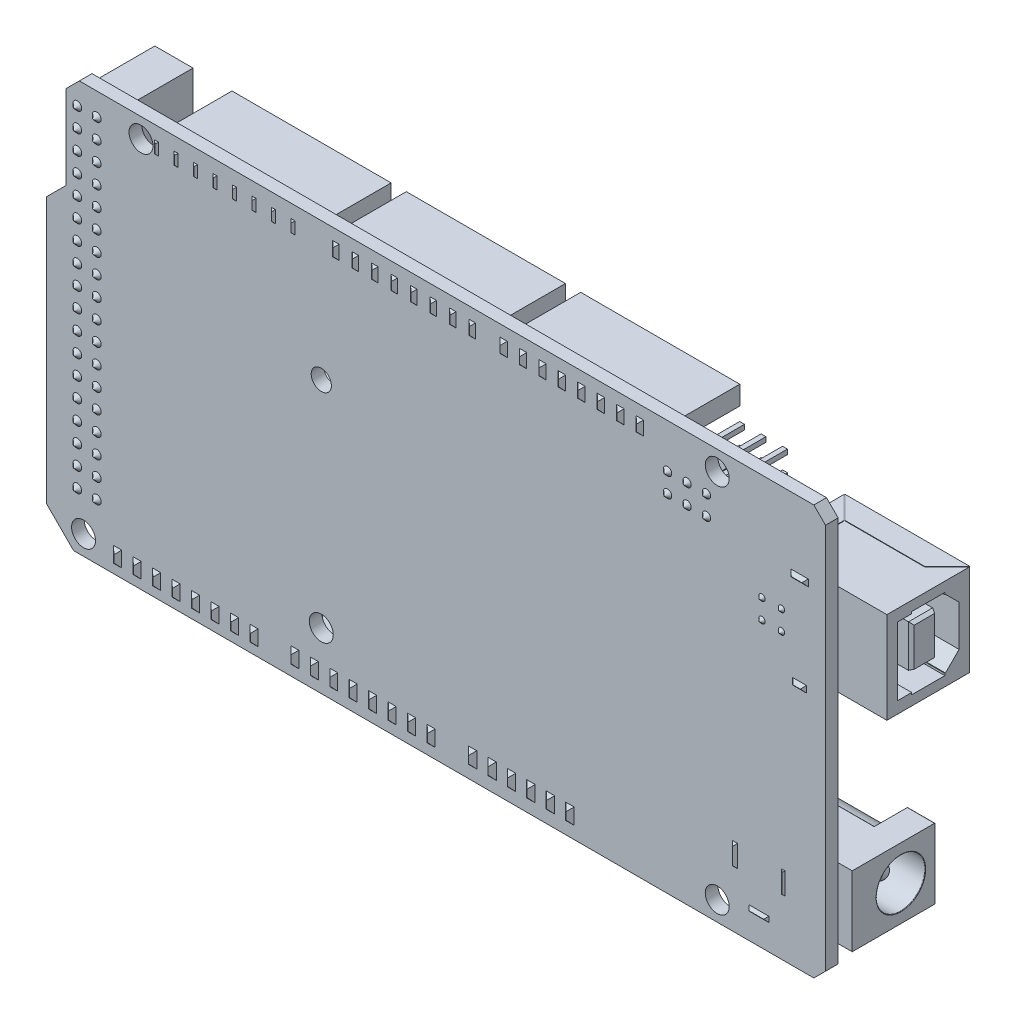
SolidWorks part; units mm, degrees
ref_plane "Front Plane" through (0, 0, 0) normal (0, 0, 1) x (1, 0, 0)
ref_plane "Top Plane" through (0, 0, 0) normal (0, 1, 0) x (1, 0, 0)
ref_plane "Right Plane" through (0, 0, 0) normal (1, 0, 0) x (0, 0, -1)
sketch "Sketch1" plane through (0, 0, 0) normal (0, 0, 1) x (1, 0, 0)
  line L1 (-50.8, 26.7081) -> (50.8, 26.7081)
  line L2 (-50.8, 26.7081) -> (-50.8, -26.7081)
  line L3 (-50.8, -26.7081) -> (50.8, -26.7081)
  line L4 (50.8, 26.7081) -> (50.8, -26.7081)
  line L5 (-50.8, 26.7081) -> (50.8, -26.7081) construction
  line L6 (-50.8, -26.7081) -> (50.8, 26.7081) construction
  point P0 (0, 0)
  dimension "D1" = 101.6
  dimension "D2" = 53.4162
extrude "Boss-Extrude1" add sketch "Sketch1" along normal blind 1.651
sketch "Sketch2" plane through (0, 0, 0) normal (0, 0, -1) x (-1, 0, 0)
  line L0 (50.8, -26.7081) -> (-50.8, -26.7081) construction
  line L1 (41.7576, 25.4889) -> (46.736, 25.4889)
  line L2 (41.7576, 25.4889) -> (41.7576, -20.7899)
  line L3 (41.7576, -20.7899) -> (46.736, -20.7899)
  line L4 (46.736, 25.4889) -> (46.736, -20.7899)
  line L5 (41.7576, 25.4889) -> (46.736, -20.7899) construction
  line L6 (41.7576, -20.7899) -> (46.736, 25.4889) construction
  line L7 (50.8, 26.7081) -> (50.8, -26.7081) construction
  line L8 (-50.8, 26.7081) -> (50.8, 26.7081) construction
  line L9 (36.6776, 25.4381) -> (15.9258, 25.4381)
  line L10 (36.6776, 25.4381) -> (36.6776, 22.9743)
  line L11 (36.6776, 22.9743) -> (15.9258, 22.9743)
  line L12 (15.9258, 25.4381) -> (15.9258, 22.9743)
  line L13 (36.6776, 25.4381) -> (15.9258, 22.9743) construction
  line L14 (36.6776, 22.9743) -> (15.9258, 25.4381) construction
  line L15 (-6.8072, 25.4381) -> (-6.8072, 22.9743)
  line L16 (13.9446, 25.4381) -> (-6.8072, 25.4381)
  line L17 (13.9446, 22.9743) -> (-6.8072, 22.9743)
  line L18 (13.9446, 25.4381) -> (13.9446, 22.9743)
  line L19 (-29.5402, 25.4381) -> (-29.5402, 22.9743)
  line L20 (-8.7884, 25.4381) -> (-29.5402, 25.4381)
  line L21 (-8.7884, 22.9743) -> (-29.5402, 22.9743)
  line L22 (-8.7884, 25.4381) -> (-8.7884, 22.9743)
  line L23 (15.9258, 25.4381) -> (-6.8072, 25.4381) construction
  line L24 (-1.016, -22.8981) -> (-1.016, -25.3619)
  line L25 (42.545, -22.8981) -> (21.717, -22.8981)
  line L26 (42.545, -22.8981) -> (42.545, -25.3619)
  line L27 (42.545, -25.3619) -> (21.717, -25.3619)
  line L28 (21.717, -22.8981) -> (21.717, -25.3619)
  line L29 (42.545, -22.8981) -> (21.717, -25.3619) construction
  line L30 (42.545, -25.3619) -> (21.717, -22.8981) construction
  line L31 (19.812, -22.8981) -> (19.812, -25.3619)
  line L32 (19.812, -22.8981) -> (-1.016, -22.8981)
  line L33 (19.812, -25.3619) -> (-1.016, -25.3619)
  line L35 (-3.175, -22.9125) -> (-18.8722, -22.9125)
  line L36 (-3.175, -22.9125) -> (-3.175, -25.3619)
  line L37 (-3.175, -25.3619) -> (-18.8722, -25.3619)
  line L38 (-18.8722, -22.9125) -> (-18.8722, -25.3619)
  point P0 (44.2468, 2.3495)
  point P9 (26.3017, 24.2062)
  point P16 (32.131, -24.13)
  dimension "D1" = 4.9784
  dimension "D2" = 46.2788
  dimension "D3" = 5.9182
  dimension "D4" = 4.064
  dimension "D5" = 20.7518
  dimension "D6" = 2.4638
  dimension "D7" = 1.27
  dimension "D8" = 5.08
  dimension "D10" = 22.733
  dimension "D11" = 2.4638
  dimension "D12" = 20.828
  dimension "D13" = 8.255
  dimension "D14" = 1.3462
  dimension "D15" = 15.6972
  dimension "D16" = 2
  dimension "D17" = 2.159
  dimension "D9" = 3
extrude "Boss-Extrude2" add sketch "Sketch2" along normal blind 8.5598
sketch "Sketch3" plane through (0, 0, 0) normal (0, 0, -1) x (-1, 0, 0)
  line L0 (-50.8, -26.7081) -> (-50.8, 26.7081) construction
  line L1 (-57.15, 17.4371) -> (-40.8432, 17.4371)
  line L2 (-57.15, 17.4371) -> (-57.15, 5.4991)
  line L3 (-57.15, 5.4991) -> (-40.8432, 5.4991)
  line L4 (-40.8432, 17.4371) -> (-40.8432, 5.4991)
  line L5 (-57.15, 17.4371) -> (-40.8432, 5.4991) construction
  line L6 (-57.15, 5.4991) -> (-40.8432, 17.4371) construction
  line L7 (-50.8, 26.7081) -> (50.8, 26.7081) construction
  point P0 (-48.9966, 11.4681)
  dimension "D1" = 16.3068
  dimension "D2" = 11.938
  dimension "D3" = 6.35
  dimension "D4" = 9.271
extrude "Boss-Extrude3" add sketch "Sketch3" along normal blind 10.795
sketch "Sketch4" plane through (0, 0, 0) normal (0, 0, -1) x (-1, 0, 0)
  line L0 (-50.8, -26.7081) -> (-50.8, 5.4991) construction
  line L1 (-52.6288, -13.7541) -> (-38.4048, -13.7541)
  line L2 (-52.6288, -13.7541) -> (-52.6288, -22.8981)
  line L3 (-52.6288, -22.8981) -> (-38.4048, -22.8981)
  line L4 (-38.4048, -13.7541) -> (-38.4048, -22.8981)
  line L5 (-52.6288, -13.7541) -> (-38.4048, -22.8981) construction
  line L6 (-52.6288, -22.8981) -> (-38.4048, -13.7541) construction
  line L7 (50.8, -26.7081) -> (-50.8, -26.7081) construction
  point P0 (-45.5168, -18.3261)
  dimension "D1" = 9.144
  dimension "D2" = 14.224
  dimension "D3" = 1.8288
  dimension "D4" = 3.81
extrude "Boss-Extrude4" add sketch "Sketch4" along normal blind 6.477
sketch "Sketch5" plane through (0, 0, -6.477) normal (0, 0, -1) x (-1, 0, 0)
  line L0 (-52.6288, -22.8981) -> (-38.4048, -22.8981) construction
  line L1 (-52.6288, -13.7541) -> (-49.0728, -13.7541)
  line L2 (-52.6288, -13.7541) -> (-52.6288, -22.8981)
  line L3 (-52.6288, -22.8981) -> (-49.0728, -22.8981)
  line L4 (-49.0728, -13.7541) -> (-49.0728, -22.8981)
  dimension "D1" = 3.556
extrude "Boss-Extrude5" add sketch "Sketch5" along normal blind 4.318
sketch "Sketch6" plane through (49.0728, 0, 0) normal (-1, 0, 0) x (0, 0, 1)
  line L0 (-6.477, -22.8981) -> (-6.477, -13.7541) construction
  line L1 (-6.477, -14.5161) -> (-6.477, -22.1361)
  arc A0 (-6.477, -14.5161) -> (-6.477, -22.1361) centre (-6.477, -18.3261) ccw
  dimension "D1" = 7.62
extrude "Boss-Extrude6" add sketch "Sketch6" along normal up to surface (10.668 mm away)
sketch "Sketch7" plane through (0, 0, -6.477) normal (0, 0, -1) x (-1, 0, 0)
  line L0 (-38.4048, -14.5161) -> (-49.0728, -14.5161) construction
  line L1 (-38.4048, -13.7541) -> (-40.005, -13.7541)
  line L2 (-38.4048, -13.7541) -> (-38.4048, -14.5161)
  line L3 (-38.4048, -14.5161) -> (-40.005, -14.5161)
  line L4 (-40.005, -13.7541) -> (-40.005, -14.5161)
  line L5 (-49.0728, -22.8981) -> (-38.4048, -22.8981) construction
  line L6 (-38.4048, -22.1361) -> (-40.005, -22.1361)
  line L7 (-38.4048, -22.1361) -> (-38.4048, -22.8981)
  line L8 (-38.4048, -22.8981) -> (-40.005, -22.8981)
  line L9 (-40.005, -22.1361) -> (-40.005, -22.8981)
  dimension "D1" = 1.6002
  dimension "D2" = 1.6002
extrude "Cut-Extrude1" cut sketch "Sketch7" against normal up to surface (6.477 mm away)
sketch "Sketch8" plane through (52.6288, 0, 0) normal (1, 0, 0) x (0, 0, -1)
  line L0 (10.795, -18.3261) -> (0, -18.3261) construction
  line L1 (10.795, -13.7541) -> (10.795, -22.8981) construction
  line L2 (0, -13.7541) -> (0, -22.8981) construction
  circle A0 centre (6.35, -18.3261) radius 3.175
  dimension "D1" = 0
  dimension "D2" = 6.35
  dimension "D3" = 4.445
extrude "Cut-Extrude2" cut sketch "Sketch8" against normal blind 12.065
sketch "Sketch9" plane through (40.5638, 0, 0) normal (1, 0, 0) x (0, 0, -1)
  circle A0 centre (6.35, -18.3261) radius 1.016
  dimension "D1" = 2.032
extrude "Boss-Extrude7" add sketch "Sketch9" along normal blind 10.16
fillet "Fillet1" radius 1.016 1 edges at (50.7238, -17.3101, -6.35)
sketch "Sketch10" plane through (57.15, 0, 0) normal (1, 0, 0) x (0, 0, -1)
  line L0 (10.795, 17.4371) -> (0, 5.4991) construction
  line L1 (10.795, 5.4991) -> (0, 17.4371) construction
  line L2 (10.795, 5.4991) -> (0, 5.4991) construction
  line L3 (7.6389, 15.9131) -> (7.5565, 15.9131)
  line L4 (9.4169, 14.1351) -> (9.4169, 8.8011)
  line L5 (7.6389, 7.0231) -> (7.5565, 7.0231)
  line L6 (1.3781, 15.9131) -> (1.3781, 7.0231)
  line L7 (9.4169, 15.9131) -> (1.3781, 7.0231) construction
  line L8 (9.4169, 7.0231) -> (1.3781, 15.9131) construction
  line L9 (9.4169, 11.4681) -> (1.3781, 11.4681) construction
  line L10 (3.2385, 7.0231) -> (1.3781, 7.0231)
  line L11 (7.5565, 7.0231) -> (7.5565, 6.7691)
  line L12 (7.5565, 6.7691) -> (3.2385, 6.7691)
  line L13 (3.2385, 7.0231) -> (3.2385, 6.7691)
  line L14 (7.5565, 7.2771) -> (3.2385, 6.7691) construction
  line L15 (7.5565, 6.7691) -> (3.2385, 7.2771) construction
  line L16 (3.2385, 15.9131) -> (3.2385, 16.1671)
  line L17 (7.5565, 16.1671) -> (3.2385, 16.1671)
  line L18 (7.5565, 15.9131) -> (7.5565, 16.1671)
  line L19 (3.2385, 15.9131) -> (1.3781, 15.9131)
  line L20 (9.4169, 8.8011) -> (7.6389, 7.0231)
  line L21 (9.4169, 14.1351) -> (7.6389, 15.9131)
  point P8 (5.3975, 11.4681)
  point P15 (5.3975, 7.0231)
  dimension "D1" = 1.524
  dimension "D2" = 0.508
  dimension "D3" = 4.318
  dimension "D4" = 1.778
  dimension "D5" = 1.778
  dimension "D6" = 45
  dimension "D7" = 45
extrude "Cut-Extrude3" cut sketch "Sketch10" against normal blind 13.97
sketch "Sketch11" plane through (43.18, 0, 0) normal (1, 0, 0) x (0, 0, -1)
  line L0 (10.795, 17.4371) -> (0, 5.4991) construction
  line L1 (10.795, 5.4991) -> (0, 17.4371) construction
  line L3 (6.9723, 14.2113) -> (3.8227, 14.2113)
  line L4 (6.9723, 14.2113) -> (6.9723, 8.7249)
  line L5 (6.9723, 8.7249) -> (3.8227, 8.7249)
  line L6 (3.8227, 14.2113) -> (3.8227, 8.7249)
  line L7 (6.9723, 14.2113) -> (3.8227, 8.7249) construction
  line L8 (6.9723, 8.7249) -> (3.8227, 14.2113) construction
  point P8 (5.3975, 11.4681)
  dimension "D1" = 3.1496
  dimension "D2" = 5.4864
extrude "Boss-Extrude8" add sketch "Sketch11" along normal blind 13.462
chamfer "Chamfer1" distance 0.254 angle 63 4 edges at (56.642, 14.2113, -5.3975) (56.642, 11.4681, -6.9723) (56.642, 8.7249, -5.3975) (56.642, 11.4681, -3.8227)
ref_plane "Plane1" through (0, 11.4681, 0) normal (0, 1, 0) x (-1, 0, 0)
sketch "Sketch12" plane through (0, 17.4371, 0) normal (0, 1, 0) x (1, 0, 0)
  line L1 (43.7896, 10.795) -> (57.15, 10.795)
  line L2 (40.8432, 10.7315) -> (43.7896, 7.7851)
  line L3 (43.8531, 7.8486) -> (54.2036, 7.8486)
  line L4 (40.8432, 0) -> (43.7896, 0)
  line L5 (40.9067, 10.795) -> (43.8531, 7.8486)
  line L6 (57.15, 10.795) -> (54.2036, 7.8486)
  line L7 (40.8432, 0) -> (40.8432, 10.7315)
  line L8 (40.9067, 10.795) -> (43.7896, 10.795)
  line L9 (43.7896, 0) -> (43.7896, 7.7851)
  dimension "D1" = 2.9464
  dimension "D2" = 45
  dimension "D3" = 2.9464
  dimension "D4" = 45
  dimension "D6" = 45
extrude "Boss-Extrude9" add sketch "Sketch12" along normal blind 0.0635
mirror "Mirror1" about plane through (0, 11.4681, 0) normal (0, 1, 0) of "Boss-Extrude9"
chamfer "Chamfer2" distance 1.524 angle 45 2 edges at (50.8, -26.7081, 0.8255) (50.8, 26.7081, 0.8255)
chamfer "Chamfer3" distance 3.556 angle 45 1 edges at (-50.8, -26.7081, 0.8255)
sketch "Sketch13" plane through (0, 0, 0) normal (0, 0, -1) x (-1, 0, 0)
  line L1 (50.8, 26.7081) -> (50.8, -23.1521) construction
  line L2 (-49.276, 26.7081) -> (50.8, 26.7081) construction
  line L3 (48.26, 24.9447) -> (48.26, 14.0081)
  line L4 (50.8, 11.4681) -> (48.26, 14.0081)
  line L5 (48.26, 24.9447) -> (46.4966, 26.7081)
  line L6 (46.4966, 26.7081) -> (50.8, 26.7081)
  line L7 (50.8, 26.7081) -> (50.8, 11.4681)
  dimension "D2" = 2.54
extrude "Cut-Extrude4" cut sketch "Sketch13" against normal up to next
sketch "Sketch14" plane through (0, 0, 0) normal (0, 0, -1) x (-1, 0, 0)
  line L1 (-6.9605, 8.5631) -> (7.073, 8.5631)
  line L2 (-6.9605, 8.5631) -> (-6.9605, -5.6349)
  line L3 (-6.9605, -5.6349) -> (7.073, -5.6349)
  line L4 (7.073, 8.5631) -> (7.073, -5.6349)
  line L5 (-24.3309, -1.1659) -> (-21.5659, -1.1659)
  line L6 (-24.3309, -1.1659) -> (-24.3309, -2.574)
  line L7 (-24.3309, -2.574) -> (-21.5659, -2.574)
  line L8 (-21.5659, -1.1659) -> (-21.5659, -2.574)
  line L9 (-33.5092, 10.32) -> (-28.4497, 10.32)
  line L10 (-33.5092, 10.32) -> (-33.5092, 5.3949)
  line L11 (-33.5092, 5.3949) -> (-28.4497, 5.3949)
  line L12 (-28.4497, 10.32) -> (-28.4497, 5.3949)
  line L13 (-43.9403, -6.0414) -> (-40.6713, -6.0414)
  line L14 (-43.9403, -6.0414) -> (-43.9403, -12.5341)
  line L15 (-43.9403, -12.5341) -> (-40.6713, -12.5341)
  line L16 (-40.6713, -6.0414) -> (-40.6713, -12.5341)
  line L17 (-31.173, -23.0456) -> (-27.138, -23.0456)
  line L18 (-31.173, -23.0456) -> (-31.173, -25.4924)
  line L19 (-31.173, -25.4924) -> (-27.138, -25.4924)
  line L20 (-27.138, -23.0456) -> (-27.138, -25.4924)
  line L21 (-33.7999, -4.2562) -> (-30.9794, -4.2562)
  line L22 (-33.7999, -4.2562) -> (-33.7999, -7.1173)
  line L23 (-33.7999, -7.1173) -> (-30.9794, -7.1173)
  line L24 (-30.9794, -4.2562) -> (-30.9794, -7.1173)
  line L25 (-32.8056, -8.9233) -> (-31.8519, -8.9233)
  line L26 (-32.8056, -8.9233) -> (-32.8056, -12.1294)
  line L27 (-32.8056, -12.1294) -> (-31.8519, -12.1294)
  line L28 (-31.8519, -8.9233) -> (-31.8519, -12.1294)
  line L29 (-30.0459, -9.4914) -> (-28.4497, -9.4914)
  line L30 (-30.0459, -9.4914) -> (-30.0459, -10.2219)
  line L31 (-30.0459, -10.2219) -> (-28.4497, -10.2219)
  line L32 (-28.4497, -9.4914) -> (-28.4497, -10.2219)
  line L33 (-36.7827, -8.6595) -> (-35.9914, -8.6595)
  line L34 (-36.7827, -8.6595) -> (-36.7827, -10.2219)
  line L35 (-36.7827, -10.2219) -> (-35.9914, -10.2219)
  line L36 (-35.9914, -8.6595) -> (-35.9914, -10.2219)
  line L37 (-48.1172, 1.9462) -> (-44.9541, 1.9462)
  line L38 (-48.1172, 1.9462) -> (-48.1172, -2.574)
  line L39 (-48.1172, -2.574) -> (-44.9541, -2.574)
  line L40 (-44.9541, 1.9462) -> (-44.9541, -2.574)
  line L41 (-42.3058, 0.1921) -> (-41.1584, 0.1921)
  line L42 (-42.3058, 0.1921) -> (-42.3058, -2.574)
  line L43 (-42.3058, -2.574) -> (-41.1584, -2.574)
  line L44 (-41.1584, 0.1921) -> (-41.1584, -2.574)
  line L45 (-12.8797, -19.5259) -> (-11.332, -19.5259)
  line L46 (-12.8797, -19.5259) -> (-12.8797, -20.252)
  line L47 (-12.8797, -20.252) -> (-11.332, -20.252)
  line L48 (-11.332, -19.5259) -> (-11.332, -20.252)
  line L49 (-17.7394, -11.1441) -> (-16.7743, -11.1441)
  line L50 (-17.7394, -11.1441) -> (-17.7394, -13.2747)
  line L51 (-17.7394, -13.2747) -> (-16.7743, -13.2747)
  line L52 (-16.7743, -11.1441) -> (-16.7743, -13.2747)
  line L53 (-10.7102, -11.6175) -> (-9.7086, -11.6175)
  line L54 (-10.7102, -11.6175) -> (-10.7102, -13.0744)
  line L55 (-10.7102, -13.0744) -> (-9.7086, -13.0744)
  line L56 (-9.7086, -11.6175) -> (-9.7086, -13.0744)
  line L57 (-13.0047, -10.7617) -> (-11.73, -10.7617)
  line L58 (-13.0047, -10.7617) -> (-13.0047, -14.0213)
  line L59 (-13.0047, -14.0213) -> (-11.73, -14.0213)
  line L60 (-11.73, -10.7617) -> (-11.73, -14.0213)
  line L61 (-16.091, -10.7617) -> (-14.2392, -10.7617)
  line L62 (-16.091, -10.7617) -> (-16.091, -14.0213)
  line L63 (-16.091, -14.0213) -> (-14.2392, -14.0213)
  line L64 (-14.2392, -10.7617) -> (-14.2392, -14.0213)
  line L65 (-23.6628, -8.3755) -> (-22.1074, -8.3755)
  line L66 (-23.6628, -8.3755) -> (-23.6628, -9.1237)
  line L67 (-23.6628, -9.1237) -> (-22.1074, -9.1237)
  line L68 (-22.1074, -8.3755) -> (-22.1074, -9.1237)
  line L69 (-23.5707, -5.0699) -> (-22.0069, -5.0699)
  line L70 (-23.5707, -5.0699) -> (-23.5707, -5.8311)
  line L71 (-23.5707, -5.8311) -> (-22.0069, -5.8311)
  line L72 (-22.0069, -5.0699) -> (-22.0069, -5.8311)
  line L73 (-39.6477, 4.309) -> (-38.0454, 4.309)
  line L74 (-39.6477, 4.309) -> (-39.6477, 3.6337)
  line L75 (-39.6477, 3.6337) -> (-38.0454, 3.6337)
  line L76 (-38.0454, 4.309) -> (-38.0454, 3.6337)
  line L77 (-39.5152, 2.6802) -> (-38.0454, 2.6802)
  line L78 (-39.5152, 2.6802) -> (-39.5152, 1.9462)
  line L79 (-39.5152, 1.9462) -> (-38.0454, 1.9462)
  line L80 (-38.0454, 2.6802) -> (-38.0454, 1.9462)
  line L81 (-36.3871, 2.6802) -> (-34.854, 2.6802)
  line L82 (-36.3871, 2.6802) -> (-36.3871, 1.9462)
  line L83 (-36.3871, 1.9462) -> (-34.854, 1.9462)
  line L84 (-34.854, 2.6802) -> (-34.854, 1.9462)
  line L85 (-33.1723, 2.8127) -> (-31.5965, 2.8127)
  line L86 (-33.1723, 2.8127) -> (-33.1723, 1.9462)
  line L87 (-33.1723, 1.9462) -> (-31.5965, 1.9462)
  line L88 (-31.5965, 2.8127) -> (-31.5965, 1.9462)
  line L89 (-30.0459, 2.8127) -> (-28.5657, 2.8127)
  line L90 (-30.0459, 2.8127) -> (-30.0459, 1.9462)
  line L91 (-30.0459, 1.9462) -> (-28.5657, 1.9462)
  line L92 (-28.5657, 2.8127) -> (-28.5657, 1.9462)
  line L93 (-26.941, 2.8127) -> (-25.3776, 2.8127)
  line L94 (-26.941, 2.8127) -> (-26.941, 1.9462)
  line L95 (-26.941, 1.9462) -> (-25.3776, 1.9462)
  line L96 (-25.3776, 2.8127) -> (-25.3776, 1.9462)
  line L97 (-23.3697, 5.7605) -> (-22.3121, 5.7605)
  line L98 (-23.3697, 5.7605) -> (-23.3697, 2.5417)
  line L99 (-23.3697, 2.5417) -> (-22.3121, 2.5417)
  line L100 (-22.3121, 5.7605) -> (-22.3121, 2.5417)
  line L101 (-23.8854, 8.0069) -> (-22.1074, 8.0069)
  line L102 (-23.8854, 8.0069) -> (-23.8854, 6.7341)
  line L103 (-23.8854, 6.7341) -> (-22.1074, 6.7341)
  line L104 (-22.1074, 8.0069) -> (-22.1074, 6.7341)
  line L105 (-23.8854, 10.32) -> (-22.1074, 10.32)
  line L106 (-23.8854, 10.32) -> (-23.8854, 9.0606)
  line L107 (-23.8854, 9.0606) -> (-22.1074, 9.0606)
  line L108 (-22.1074, 10.32) -> (-22.1074, 9.0606)
  line L109 (-23.3697, 14.0967) -> (-22.5161, 14.0967)
  line L110 (-23.3697, 14.0967) -> (-23.3697, 10.8407)
  line L111 (-23.3697, 10.8407) -> (-22.5161, 10.8407)
  line L112 (-22.5161, 14.0967) -> (-22.5161, 10.8407)
  line L113 (-23.8854, 15.886) -> (-22.1074, 15.886)
  line L114 (-23.8854, 15.886) -> (-23.8854, 14.654)
  line L115 (-23.8854, 14.654) -> (-22.1074, 14.654)
  line L116 (-22.1074, 15.886) -> (-22.1074, 14.654)
  line L117 (-23.7484, 17.9417) -> (-22.3121, 17.9417)
  line L118 (-23.7484, 17.9417) -> (-23.7484, 17.187)
  line L119 (-23.7484, 17.187) -> (-22.3121, 17.187)
  line L120 (-22.3121, 17.9417) -> (-22.3121, 17.187)
  line L121 (-43.674, 18.8311) -> (-41.7321, 18.8311)
  line L122 (-43.674, 18.8311) -> (-43.674, 17.7416)
  line L123 (-43.674, 17.7416) -> (-41.7321, 17.7416)
  line L124 (-41.7321, 18.8311) -> (-41.7321, 17.7416)
  line L125 (-39.6477, 15.6816) -> (-38.0454, 15.6816)
  line L126 (-39.6477, 15.6816) -> (-39.6477, 14.9091)
  line L127 (-39.6477, 14.9091) -> (-38.0454, 14.9091)
  line L128 (-38.0454, 15.6816) -> (-38.0454, 14.9091)
  line L129 (-39.6477, 13.3641) -> (-38.0454, 13.3641)
  line L130 (-39.6477, 13.3641) -> (-39.6477, 12.4687)
  line L131 (-39.6477, 12.4687) -> (-38.0454, 12.4687)
  line L132 (-38.0454, 13.3641) -> (-38.0454, 12.4687)
  line L133 (-39.3497, 11.7365) -> (-38.3867, 11.7365)
  line L134 (-39.3497, 11.7365) -> (-39.3497, 8.5631)
  line L135 (-39.3497, 8.5631) -> (-38.3867, 8.5631)
  line L136 (-38.3867, 11.7365) -> (-38.3867, 8.5631)
  line L137 (-39.6477, 7.8575) -> (-38.0454, 7.8575)
  line L138 (-39.6477, 7.8575) -> (-39.6477, 6.9215)
  line L139 (-39.6477, 6.9215) -> (-38.0454, 6.9215)
  line L140 (-38.0454, 7.8575) -> (-38.0454, 6.9215)
  line L141 (24.8756, 10.8407) -> (26.6802, 10.8407)
  line L142 (24.8756, 10.8407) -> (24.8756, 9.4206)
  line L143 (24.8756, 9.4206) -> (26.6802, 9.4206)
  line L144 (26.6802, 10.8407) -> (26.6802, 9.4206)
  line L145 (29.6259, 11.7365) -> (30.8732, 11.7365)
  line L146 (29.6259, 11.7365) -> (29.6259, 8.3325)
  line L147 (29.6259, 8.3325) -> (30.8732, 8.3325)
  line L148 (30.8732, 11.7365) -> (30.8732, 8.3325)
  line L149 (-38.9776, 20.9935) -> (-37.1574, 20.9935)
  line L150 (-38.9776, 20.9935) -> (-38.9776, 17.7416)
  line L151 (-38.9776, 17.7416) -> (-37.1574, 17.7416)
  line L152 (-37.1574, 20.9935) -> (-37.1574, 17.7416)
extrude "Boss-Extrude10" add sketch "Sketch14" along normal blind 1.397
sketch "Sketch15" plane through (0, 0, 0) normal (0, 0, -1) x (-1, 0, 0)
  line L1 (20.5142, 4.069) -> (26.9751, 4.069)
  line L2 (20.5142, 4.069) -> (20.5142, -2.21)
  line L3 (20.5142, -2.21) -> (26.9751, -2.21)
  line L4 (26.9751, 4.069) -> (26.9751, -2.21)
extrude "Boss-Extrude11" add sketch "Sketch15" along normal blind 2.286
sketch "Sketch16" plane through (0, 0, -2.286) normal (0, 0, -1) x (-1, 0, 0)
  line L0 (20.5142, 4.069) -> (26.9751, -2.21) construction
  circle A0 centre (23.7447, 0.9295) radius 1.524
  dimension "D1" = 3.048
extrude "Boss-Extrude12" add sketch "Sketch16" along normal blind 1.016
sketch "Sketch17" plane through (0, 0, 0) normal (0, 0, -1) x (-1, 0, 0)
  line L0 (-32.3335, 0.8451) -> (-32.3335, -2.9138) construction
  line L1 (-36.2828, -2.9138) -> (-28.3841, -2.9138)
  line L2 (-36.2828, -2.9138) -> (-36.2828, 0.8451) construction
  line L3 (-36.2828, 0.8451) -> (-28.3841, 0.8451)
  line L4 (-28.3841, -2.9138) -> (-28.3841, 0.8451) construction
  arc A0 (-36.2828, -2.9138) -> (-36.2828, 0.8451) centre (-35.9606, -1.0343) cw
  arc A1 (-28.3841, -2.9138) -> (-28.3841, 0.8451) centre (-28.7063, -1.0343) ccw
extrude "Boss-Extrude13" add sketch "Sketch17" along normal blind 3.3528
fillet "Fillet2" radius 0.508 4 edges at (32.3335, 0.8451, -3.3528) (26.7995, -1.0343, -3.3528) (32.3335, -2.9138, -3.3528) (37.8675, -1.0343, -3.3528)
sketch "Sketch19" plane through (0, 0, 0) normal (0, 0, -1) x (-1, 0, 0)
  circle A0 centre (-32.7701, -18.1074) radius 3.302
  circle A1 centre (-25.5812, -18.1074) radius 3.302
  dimension "D1" = 6.604
extrude "Boss-Extrude14" add sketch "Sketch19" along normal blind 5.461
fillet "Fillet3" radius 0.254 2 edges at (22.2792, -18.1074, -5.461) (29.4681, -18.1074, -5.461)
sketch "Sketch20" plane through (0, 0, 0) normal (0, 0, -1) x (-1, 0, 0)
  line L0 (11.7084, 3.2926) -> (12.7244, 2.2766)
  line L1 (16.103, 4.9732) -> (17.119, 3.9572)
  line L2 (11.7084, 3.9572) -> (11.7084, 3.2926)
  line L3 (12.7244, 2.2766) -> (16.103, 2.2766)
  line L4 (17.119, 3.9572) -> (17.119, 3.2926)
  line L5 (16.103, 2.2766) -> (17.119, 3.2926)
  line L6 (12.7244, 4.9732) -> (16.103, 4.9732)
  line L7 (12.7244, 2.1792) -> (16.103, 2.1792)
  line L8 (12.7244, -0.5174) -> (16.103, -0.5174)
  line L9 (11.7084, 3.9572) -> (12.7244, 4.9732)
  line L10 (11.7084, 0.4986) -> (12.7244, -0.5174)
  line L11 (11.7084, 1.1632) -> (11.7084, 0.4986)
  line L12 (11.7084, 1.1632) -> (12.7244, 2.1792)
  line L13 (16.103, 2.1792) -> (17.119, 1.1632)
  line L14 (17.119, 1.1632) -> (17.119, 0.4986)
  line L15 (16.103, -0.5174) -> (17.119, 0.4986)
  line L16 (12.7244, -0.6148) -> (16.103, -0.6148)
  line L17 (-36.5713, 21.0509) -> (-35.5553, 22.0669)
  line L18 (-35.5553, 22.0669) -> (-34.8949, 22.0669)
  line L19 (-36.5713, 21.0509) -> (-36.5713, 17.6727)
  line L20 (-35.5553, 16.6567) -> (-34.8949, 16.6567)
  line L21 (-33.8789, 21.0509) -> (-33.8789, 17.6727)
  line L22 (12.7244, -3.3114) -> (16.103, -3.3114)
  line L23 (11.7084, -2.2954) -> (12.7244, -3.3114)
  line L24 (11.7084, -1.6308) -> (11.7084, -2.2954)
  line L25 (11.7084, -1.6308) -> (12.7244, -0.6148)
  line L26 (16.103, -0.6148) -> (17.119, -1.6308)
  line L27 (17.119, -1.6308) -> (17.119, -2.2954)
  line L28 (16.103, -3.3114) -> (17.119, -2.2954)
  line L29 (12.7244, 4.9732) -> (12.7244, 2.1792) construction
  line L30 (-34.8949, 22.0669) -> (-33.8789, 21.0509)
  line L31 (-34.8949, 16.6567) -> (-33.8789, 17.6727)
  line L32 (-36.5713, 17.6727) -> (-35.5553, 16.6567)
  line L33 (-32.7613, 22.0669) -> (-32.1009, 22.0669)
  line L34 (-32.1009, 22.0669) -> (-31.0849, 21.0509)
  line L35 (-31.0849, 21.0509) -> (-31.0849, 17.6727)
  line L36 (-32.1009, 16.6567) -> (-31.0849, 17.6727)
  line L37 (-32.7613, 16.6567) -> (-32.1009, 16.6567)
  line L38 (-33.7773, 17.6727) -> (-32.7613, 16.6567)
  line L39 (-33.7773, 21.0509) -> (-33.7773, 17.6727)
  line L40 (-33.7773, 21.0509) -> (-32.7613, 22.0669)
  line L41 (-29.9673, 22.0669) -> (-29.3069, 22.0669)
  line L42 (-29.3069, 22.0669) -> (-28.2909, 21.0509)
  line L43 (-28.2909, 21.0509) -> (-28.2909, 17.6727)
  line L44 (-29.3069, 16.6567) -> (-28.2909, 17.6727)
  line L45 (-29.9673, 16.6567) -> (-29.3069, 16.6567)
  line L46 (-30.9833, 17.6727) -> (-29.9673, 16.6567)
  line L47 (-30.9833, 21.0509) -> (-30.9833, 17.6727)
  line L48 (-30.9833, 21.0509) -> (-29.9673, 22.0669)
  line L49 (-35.5553, 22.0669) -> (-32.7613, 22.0669) construction
  point P0 (11.7084, 4.9732)
  point P1 (17.119, -2.9495)
  point P2 (11.7084, -2.9495)
  point P3 (17.119, 4.9732)
  point P5 (17.119, 2.2766)
  point P6 (11.7084, 2.2766)
  point P14 (-36.5713, 22.0669)
  point P33 (-33.8789, 16.6567)
  point P34 (-36.5713, 16.6567)
  point P35 (-33.8789, 22.0669)
  dimension "D1" = 3
  dimension "D2" = 2.794
  dimension "D3" = 2.6965
  dimension "D4" = 5.4102
  dimension "D5" = 2.6924
  dimension "D6" = 5.4106
  dimension "D7" = 2.794
extrude "Boss-Extrude15" add sketch "Sketch20" along normal blind 2.54
sketch "Sketch21" plane through (0, 0, -2.54) normal (0, 0, -1) x (-1, 0, 0)
  line L0 (11.7084, 3.6249) -> (17.119, 3.6249) construction
  line L1 (11.7084, 3.9572) -> (11.7084, 3.2926) construction
  line L2 (17.119, 3.2926) -> (17.119, 3.9572) construction
  line L3 (14.4137, 4.9732) -> (14.4137, -3.3114) construction
  line L4 (16.103, 4.9732) -> (12.7244, 4.9732) construction
  line L5 (12.7244, -3.3114) -> (16.103, -3.3114) construction
  line L6 (12.7627, 1.1484) -> (13.3977, 1.1484)
  line L7 (12.7627, 3.9424) -> (13.3977, 3.9424)
  line L8 (12.7627, 3.9424) -> (12.7627, 3.3074)
  line L9 (12.7627, 3.3074) -> (13.3977, 3.3074)
  line L10 (13.3977, 3.9424) -> (13.3977, 3.3074)
  line L11 (12.7627, 3.9424) -> (13.3977, 3.3074) construction
  line L12 (12.7627, 3.3074) -> (13.3977, 3.9424) construction
  line L13 (12.7627, 1.1484) -> (12.7627, 0.5134)
  line L14 (13.3977, 1.1484) -> (13.3977, 0.5134)
  line L15 (12.7627, 0.5134) -> (13.3977, 0.5134)
  line L16 (12.7627, -1.6456) -> (13.3977, -1.6456)
  line L17 (12.7627, -1.6456) -> (12.7627, -2.2806)
  line L18 (13.3977, -1.6456) -> (13.3977, -2.2806)
  line L19 (12.7627, -2.2806) -> (13.3977, -2.2806)
  line L20 (12.7627, 3.9424) -> (12.7627, 1.1484) construction
  line L21 (15.4297, -1.6456) -> (15.4297, -2.2806)
  line L22 (16.0647, -2.2806) -> (15.4297, -2.2806)
  line L23 (16.0647, -1.6456) -> (16.0647, -2.2806)
  line L24 (16.0647, -1.6456) -> (15.4297, -1.6456)
  line L25 (16.0647, 0.5134) -> (15.4297, 0.5134)
  line L26 (15.4297, 1.1484) -> (15.4297, 0.5134)
  line L27 (16.0647, 1.1484) -> (16.0647, 0.5134)
  line L28 (16.0647, 1.1484) -> (15.4297, 1.1484)
  line L29 (16.0647, 3.3074) -> (15.4297, 3.3074)
  line L30 (15.4297, 3.9424) -> (15.4297, 3.3074)
  line L31 (16.0647, 3.9424) -> (16.0647, 3.3074)
  line L32 (16.0647, 3.9424) -> (15.4297, 3.9424)
  line L33 (-36.5713, 19.3618) -> (-28.2909, 19.3618) construction
  line L34 (-36.5713, 21.0509) -> (-36.5713, 17.6727) construction
  line L35 (-28.2909, 17.6727) -> (-28.2909, 21.0509) construction
  line L36 (-35.2251, 22.0669) -> (-35.2251, 16.6567) construction
  line L37 (-34.8949, 22.0669) -> (-35.5553, 22.0669) construction
  line L38 (-35.5553, 16.6567) -> (-34.8949, 16.6567) construction
  line L39 (-32.7486, 18.3458) -> (-32.7486, 17.7108)
  line L40 (-35.5426, 18.3458) -> (-34.9076, 18.3458)
  line L41 (-35.5426, 18.3458) -> (-35.5426, 17.7108)
  line L42 (-35.5426, 17.7108) -> (-34.9076, 17.7108)
  line L43 (-34.9076, 18.3458) -> (-34.9076, 17.7108)
  line L44 (-35.5426, 18.3458) -> (-34.9076, 17.7108) construction
  line L45 (-35.5426, 17.7108) -> (-34.9076, 18.3458) construction
  line L46 (-32.7486, 18.3458) -> (-32.1136, 18.3458)
  line L47 (-32.1136, 18.3458) -> (-32.1136, 17.7108)
  line L48 (-32.7486, 17.7108) -> (-32.1136, 17.7108)
  line L49 (-29.9546, 18.3458) -> (-29.9546, 17.7108)
  line L50 (-29.9546, 18.3458) -> (-29.3196, 18.3458)
  line L51 (-29.3196, 18.3458) -> (-29.3196, 17.7108)
  line L52 (-29.9546, 17.7108) -> (-29.3196, 17.7108)
  line L53 (-35.5426, 18.3458) -> (-32.7486, 18.3458) construction
  line L54 (-29.9546, 21.0128) -> (-29.3196, 21.0128)
  line L55 (-29.3196, 20.3778) -> (-29.3196, 21.0128)
  line L56 (-29.9546, 20.3778) -> (-29.9546, 21.0128)
  line L57 (-29.9546, 20.3778) -> (-29.3196, 20.3778)
  line L58 (-32.7486, 21.0128) -> (-32.1136, 21.0128)
  line L59 (-32.1136, 20.3778) -> (-32.1136, 21.0128)
  line L60 (-32.7486, 20.3778) -> (-32.7486, 21.0128)
  line L61 (-32.7486, 20.3778) -> (-32.1136, 20.3778)
  line L62 (-35.5426, 21.0128) -> (-34.9076, 21.0128)
  line L63 (-34.9076, 20.3778) -> (-34.9076, 21.0128)
  line L64 (-35.5426, 20.3778) -> (-34.9076, 20.3778)
  line L65 (-35.5426, 20.3778) -> (-35.5426, 21.0128)
  point P12 (13.0802, 3.6249)
  point P51 (-35.2251, 18.0283)
  dimension "D1" = 0.635
  dimension "D2" = 0.635
  dimension "D4" = 2.794
  dimension "D5" = 1.016
  dimension "D6" = 1.016
  dimension "D7" = 0.635
  dimension "D8" = 0.635
  dimension "D9" = 2.794
  dimension "D3" = 3
  dimension "D10" = 3
extrude "Boss-Extrude16" add sketch "Sketch21" along normal blind 6.223
chamfer "Chamfer4" distance 0.127 angle 45 48 edges at (-12.7627, -1.9631, -8.763) (-13.0802, -1.6456, -8.763) (-13.3977, -1.9631, -8.763) (-13.0802, -2.2806, -8.763) (-12.7627, 0.8309, -8.763) (-13.0802, 1.1484, -8.763) (-13.3977, 0.8309, -8.763) (-13.0802, 0.5134, -8.763) (-13.0802, 3.3074, -8.763) (-12.7627, 3.6249, -8.763) (-13.0802, 3.9424, -8.763) (-13.3977, 3.6249, -8.763) (-15.7472, 3.3074, -8.763) (-15.4297, 3.6249, -8.763) (-15.7472, 3.9424, -8.763) (-16.0647, 3.6249, -8.763) (-15.7472, 0.5134, -8.763) (-15.4297, 0.8309, -8.763) (-15.7472, 1.1484, -8.763) (-16.0647, 0.8309, -8.763) (-16.0647, -1.9631, -8.763) (-15.7472, -2.2806, -8.763) (-15.4297, -1.9631, -8.763) (-15.7472, -1.6456, -8.763) (35.2251, 17.7108, -8.763) (35.5426, 18.0283, -8.763) (35.2251, 18.3458, -8.763) (34.9076, 18.0283, -8.763) (35.2251, 21.0128, -8.763) (34.9076, 20.6953, -8.763) (35.2251, 20.3778, -8.763) (35.5426, 20.6953, -8.763) (32.4311, 21.0128, -8.763) (32.1136, 20.6953, -8.763) (32.4311, 20.3778, -8.763) (32.7486, 20.6953, -8.763) (29.6371, 21.0128, -8.763) (29.3196, 20.6953, -8.763) (29.6371, 20.3778, -8.763) (29.9546, 20.6953, -8.763) (32.7486, 18.0283, -8.763) (32.4311, 18.3458, -8.763) (32.1136, 18.0283, -8.763) (32.4311, 17.7108, -8.763) (29.9546, 18.0283, -8.763) (29.6371, 18.3458, -8.763) (29.3196, 18.0283, -8.763) (29.6371, 17.7108, -8.763)
sketch "Sketch22" plane through (0, 0, 0) normal (0, 0, -1) x (-1, 0, 0)
  line L0 (-50.8, -25.1841) -> (-50.8, -22.8981) construction
  line L1 (47.244, -26.7081) -> (-49.276, -26.7081) construction
  line L2 (-36.6776, -24.1681) -> (-36.6776, 25.7302) construction
  line L3 (-49.276, 26.7081) -> (46.4966, 26.7081) construction
  line L4 (14.9479, -19.2896) -> (14.9479, 8.7266) construction
  line L5 (50.8, 11.4681) -> (50.8, -23.1521) construction
  circle A0 centre (38.4556, 24.1681) radius 1.5621
  circle A1 centre (14.9479, 8.7266) radius 1.3153
  circle A2 centre (14.9479, -19.2896) radius 1.5621
  circle A3 centre (45.9486, -24.1681) radius 1.5621
  circle A4 centre (-36.6776, -24.1681) radius 1.5621
  circle A5 centre (-36.6776, 24.1681) radius 1.5621
  dimension "D1" = 3.1242
  dimension "D2" = 14.1224
  dimension "D3" = 2.54
  dimension "D4" = 2.54
  dimension "D5" = 82.6262
  dimension "D6" = 2.54
  dimension "D7" = 2.54
  dimension "D8" = 75.1332
  dimension "D9" = 28.0162
  dimension "D10" = 0
  dimension "D11" = 0
  dimension "D12" = 0
  dimension "D13" = 35.8521
extrude "Cut-Extrude5" cut sketch "Sketch22" against normal up to next
sketch "Sketch24" plane through (0, 0, -8.5598) normal (0, 0, -1) x (-1, 0, 0)
  line L0 (44.2468, 25.4889) -> (44.2468, -20.7899) construction
  line L1 (46.736, 25.4889) -> (41.7576, 25.4889) construction
  line L2 (41.7576, -20.7899) -> (46.736, -20.7899) construction
  line L3 (44.2468, 25.4889) -> (46.736, 25.4889) construction
  line L4 (41.7576, 2.3495) -> (46.736, 2.3495) construction
  line L5 (41.7576, 25.4889) -> (41.7576, -20.7899) construction
  line L6 (46.736, -20.7899) -> (46.736, 25.4889) construction
  line L7 (45.4914, 25.4889) -> (45.4914, 2.3495) construction
  line L8 (42.6402, 24.1681) -> (42.6402, 23.4442)
  line L9 (43.3641, 23.4442) -> (42.6402, 23.4442)
  line L10 (45.1294, 24.1681) -> (45.8533, 24.1681)
  line L11 (45.1294, 24.1681) -> (45.1294, 23.4442)
  line L12 (45.1294, 23.4442) -> (45.8533, 23.4442)
  line L13 (45.8533, 24.1681) -> (45.8533, 23.4442)
  line L14 (45.1294, 24.1681) -> (45.8533, 23.4442) construction
  line L15 (45.1294, 23.4442) -> (45.8533, 24.1681) construction
  line L16 (43.3641, 24.1681) -> (42.6402, 24.1681)
  line L17 (43.3641, 24.1681) -> (43.3641, 23.4442)
  line L18 (43.3642, 21.6281) -> (42.6403, 21.6281)
  line L19 (42.6403, 21.6281) -> (42.6403, 20.9042)
  line L20 (43.3642, 20.9042) -> (42.6403, 20.9042)
  line L21 (43.3642, 21.6281) -> (43.3642, 20.9042)
  line L22 (45.1295, 21.6281) -> (45.8534, 21.6281)
  line L23 (45.1295, 21.6281) -> (45.1295, 20.9042)
  line L24 (45.1295, 20.9042) -> (45.8534, 20.9042)
  line L25 (45.8534, 21.6281) -> (45.8534, 20.9042)
  line L26 (43.3642, 19.0881) -> (42.6403, 19.0881)
  line L27 (42.6403, 19.0881) -> (42.6403, 18.3642)
  line L28 (43.3642, 18.3642) -> (42.6403, 18.3642)
  line L29 (43.3642, 19.0881) -> (43.3642, 18.3642)
  line L30 (45.1295, 19.0881) -> (45.8534, 19.0881)
  line L31 (45.1295, 19.0881) -> (45.1295, 18.3642)
  line L32 (45.1295, 18.3642) -> (45.8534, 18.3642)
  line L33 (45.8534, 19.0881) -> (45.8534, 18.3642)
  line L34 (43.3642, 16.5481) -> (42.6403, 16.5481)
  line L35 (42.6403, 16.5481) -> (42.6403, 15.8242)
  line L36 (43.3642, 15.8242) -> (42.6403, 15.8242)
  line L37 (43.3642, 16.5481) -> (43.3642, 15.8242)
  line L38 (45.1295, 16.5481) -> (45.8534, 16.5481)
  line L39 (45.1295, 16.5481) -> (45.1295, 15.8242)
  line L40 (45.1295, 15.8242) -> (45.8534, 15.8242)
  line L41 (45.8534, 16.5481) -> (45.8534, 15.8242)
  line L42 (43.3642, 14.0081) -> (42.6403, 14.0081)
  line L43 (42.6403, 14.0081) -> (42.6403, 13.2842)
  line L44 (43.3642, 13.2842) -> (42.6403, 13.2842)
  line L45 (43.3642, 14.0081) -> (43.3642, 13.2842)
  line L46 (45.1295, 14.0081) -> (45.8534, 14.0081)
  line L47 (45.1295, 14.0081) -> (45.1295, 13.2842)
  line L48 (45.1295, 13.2842) -> (45.8534, 13.2842)
  line L49 (45.8534, 14.0081) -> (45.8534, 13.2842)
  line L50 (43.3642, 11.4681) -> (42.6403, 11.4681)
  line L51 (42.6403, 11.4681) -> (42.6403, 10.7442)
  line L52 (43.3642, 10.7442) -> (42.6403, 10.7442)
  line L53 (43.3642, 11.4681) -> (43.3642, 10.7442)
  line L54 (45.1295, 11.4681) -> (45.8534, 11.4681)
  line L55 (45.1295, 11.4681) -> (45.1295, 10.7442)
  line L56 (45.1295, 10.7442) -> (45.8534, 10.7442)
  line L57 (45.8534, 11.4681) -> (45.8534, 10.7442)
  line L58 (43.3642, 8.9281) -> (42.6403, 8.9281)
  line L59 (42.6403, 8.9281) -> (42.6403, 8.2042)
  line L60 (43.3642, 8.2042) -> (42.6403, 8.2042)
  line L61 (43.3642, 8.9281) -> (43.3642, 8.2042)
  line L62 (45.1295, 8.9281) -> (45.8534, 8.9281)
  line L63 (45.1295, 8.9281) -> (45.1295, 8.2042)
  line L64 (45.1295, 8.2042) -> (45.8534, 8.2042)
  line L65 (45.8534, 8.9281) -> (45.8534, 8.2042)
  line L66 (43.3642, 6.3881) -> (42.6403, 6.3881)
  line L67 (42.6403, 6.3881) -> (42.6403, 5.6642)
  line L68 (43.3642, 5.6642) -> (42.6403, 5.6642)
  line L69 (43.3642, 6.3881) -> (43.3642, 5.6642)
  line L70 (45.1295, 6.3881) -> (45.8534, 6.3881)
  line L71 (45.1295, 6.3881) -> (45.1295, 5.6642)
  line L72 (45.1295, 5.6642) -> (45.8534, 5.6642)
  line L73 (45.8534, 6.3881) -> (45.8534, 5.6642)
  line L74 (43.3642, 3.8481) -> (42.6403, 3.8481)
  line L75 (42.6403, 3.8481) -> (42.6403, 3.1242)
  line L76 (43.3642, 3.1242) -> (42.6403, 3.1242)
  line L77 (43.3642, 3.8481) -> (43.3642, 3.1242)
  line L78 (45.1295, 3.8481) -> (45.8534, 3.8481)
  line L79 (45.1295, 3.8481) -> (45.1295, 3.1242)
  line L80 (45.1295, 3.1242) -> (45.8534, 3.1242)
  line L81 (45.8534, 3.8481) -> (45.8534, 3.1242)
  line L82 (43.3642, 1.3081) -> (42.6403, 1.3081)
  line L83 (42.6403, 1.3081) -> (42.6403, 0.5842)
  line L84 (43.3642, 0.5842) -> (42.6403, 0.5842)
  line L85 (43.3642, 1.3081) -> (43.3642, 0.5842)
  line L86 (45.1295, 1.3081) -> (45.8534, 1.3081)
  line L87 (45.1295, 1.3081) -> (45.1295, 0.5842)
  line L88 (45.1295, 0.5842) -> (45.8534, 0.5842)
  line L89 (45.8534, 1.3081) -> (45.8534, 0.5842)
  line L90 (43.3642, -1.2319) -> (42.6403, -1.2319)
  line L91 (42.6403, -1.2319) -> (42.6403, -1.9558)
  line L92 (43.3642, -1.9558) -> (42.6403, -1.9558)
  line L93 (43.3642, -1.2319) -> (43.3642, -1.9558)
  line L94 (45.1295, -1.2319) -> (45.8534, -1.2319)
  line L95 (45.1295, -1.2319) -> (45.1295, -1.9558)
  line L96 (45.1295, -1.9558) -> (45.8534, -1.9558)
  line L97 (45.8534, -1.2319) -> (45.8534, -1.9558)
  line L98 (43.3642, -3.7719) -> (42.6403, -3.7719)
  line L99 (42.6403, -3.7719) -> (42.6403, -4.4958)
  line L100 (43.3642, -4.4958) -> (42.6403, -4.4958)
  line L101 (43.3642, -3.7719) -> (43.3642, -4.4958)
  line L102 (45.1295, -3.7719) -> (45.8534, -3.7719)
  line L103 (45.1295, -3.7719) -> (45.1295, -4.4958)
  line L104 (45.1295, -4.4958) -> (45.8534, -4.4958)
  line L105 (45.8534, -3.7719) -> (45.8534, -4.4958)
  line L106 (43.3642, -6.3119) -> (42.6403, -6.3119)
  line L107 (42.6403, -6.3119) -> (42.6403, -7.0358)
  line L108 (43.3642, -7.0358) -> (42.6403, -7.0358)
  line L109 (43.3642, -6.3119) -> (43.3642, -7.0358)
  line L110 (45.1295, -6.3119) -> (45.8534, -6.3119)
  line L111 (45.1295, -6.3119) -> (45.1295, -7.0358)
  line L112 (45.1295, -7.0358) -> (45.8534, -7.0358)
  line L113 (45.8534, -6.3119) -> (45.8534, -7.0358)
  line L114 (43.3642, -8.8519) -> (42.6403, -8.8519)
  line L115 (42.6403, -8.8519) -> (42.6403, -9.5758)
  line L116 (43.3642, -9.5758) -> (42.6403, -9.5758)
  line L117 (43.3642, -8.8519) -> (43.3642, -9.5758)
  line L118 (45.1295, -8.8519) -> (45.8534, -8.8519)
  line L119 (45.1295, -8.8519) -> (45.1295, -9.5758)
  line L120 (45.1295, -9.5758) -> (45.8534, -9.5758)
  line L121 (45.8534, -8.8519) -> (45.8534, -9.5758)
  line L122 (43.3642, -11.3919) -> (42.6403, -11.3919)
  line L123 (42.6403, -11.3919) -> (42.6403, -12.1158)
  line L124 (43.3642, -12.1158) -> (42.6403, -12.1158)
  line L125 (43.3642, -11.3919) -> (43.3642, -12.1158)
  line L126 (45.1295, -11.3919) -> (45.8534, -11.3919)
  line L127 (45.1295, -11.3919) -> (45.1295, -12.1158)
  line L128 (45.1295, -12.1158) -> (45.8534, -12.1158)
  line L129 (45.8534, -11.3919) -> (45.8534, -12.1158)
  line L130 (43.3642, -13.9319) -> (42.6403, -13.9319)
  line L131 (42.6403, -13.9319) -> (42.6403, -14.6558)
  line L132 (43.3642, -14.6558) -> (42.6403, -14.6558)
  line L133 (43.3642, -13.9319) -> (43.3642, -14.6558)
  line L134 (45.1295, -13.9319) -> (45.8534, -13.9319)
  line L135 (45.1295, -13.9319) -> (45.1295, -14.6558)
  line L136 (45.1295, -14.6558) -> (45.8534, -14.6558)
  line L137 (45.8534, -13.9319) -> (45.8534, -14.6558)
  line L138 (43.3642, -16.4719) -> (42.6403, -16.4719)
  line L139 (42.6403, -16.4719) -> (42.6403, -17.1958)
  line L140 (43.3642, -17.1958) -> (42.6403, -17.1958)
  line L141 (43.3642, -16.4719) -> (43.3642, -17.1958)
  line L142 (45.1295, -16.4719) -> (45.8534, -16.4719)
  line L143 (45.1295, -16.4719) -> (45.1295, -17.1958)
  line L144 (45.1295, -17.1958) -> (45.8534, -17.1958)
  line L145 (45.8534, -16.4719) -> (45.8534, -17.1958)
  line L146 (43.3642, -19.0119) -> (42.6403, -19.0119)
  line L147 (42.6403, -19.0119) -> (42.6403, -19.7358)
  line L148 (43.3642, -19.7358) -> (42.6403, -19.7358)
  line L149 (43.3642, -19.0119) -> (43.3642, -19.7358)
  line L150 (45.1295, -19.0119) -> (45.8534, -19.0119)
  line L151 (45.1295, -19.0119) -> (45.1295, -19.7358)
  line L152 (45.1295, -19.7358) -> (45.8534, -19.7358)
  line L153 (45.8534, -19.0119) -> (45.8534, -19.7358)
  line L154 (15.9258, 24.2062) -> (36.6776, 24.2062) construction
  line L155 (15.9258, 25.4381) -> (15.9258, 22.9743) construction
  line L156 (36.6776, 22.9743) -> (36.6776, 25.4381) construction
  line L157 (32.0929, 24.5682) -> (32.0929, 23.8443)
  line L158 (34.6329, 24.5682) -> (35.3568, 24.5682)
  line L159 (34.6329, 24.5682) -> (34.6329, 23.8443)
  line L160 (34.6329, 23.8443) -> (35.3568, 23.8443)
  line L161 (35.3568, 24.5682) -> (35.3568, 23.8443)
  line L162 (34.6329, 24.5682) -> (35.3568, 23.8443) construction
  line L163 (34.6329, 23.8443) -> (35.3568, 24.5682) construction
  line L164 (32.8168, 24.5682) -> (32.8168, 23.8443)
  line L165 (32.0929, 24.5682) -> (32.8168, 24.5682)
  line L166 (32.0929, 23.8443) -> (32.8168, 23.8443)
  line L167 (29.5529, 24.5682) -> (29.5529, 23.8443)
  line L168 (30.2768, 24.5682) -> (30.2768, 23.8443)
  line L169 (29.5529, 24.5682) -> (30.2768, 24.5682)
  line L170 (29.5529, 23.8443) -> (30.2768, 23.8443)
  line L171 (27.0129, 24.5682) -> (27.0129, 23.8443)
  line L172 (27.7368, 24.5682) -> (27.7368, 23.8443)
  line L173 (27.0129, 24.5682) -> (27.7368, 24.5682)
  line L174 (27.0129, 23.8443) -> (27.7368, 23.8443)
  line L175 (24.4729, 24.5682) -> (24.4729, 23.8443)
  line L176 (25.1968, 24.5682) -> (25.1968, 23.8443)
  line L177 (24.4729, 24.5682) -> (25.1968, 24.5682)
  line L178 (24.4729, 23.8443) -> (25.1968, 23.8443)
  line L179 (21.9329, 24.5681) -> (21.9329, 23.8442)
  line L180 (22.6568, 24.5681) -> (22.6568, 23.8442)
  line L181 (21.9329, 24.5681) -> (22.6568, 24.5681)
  line L182 (21.9329, 23.8442) -> (22.6568, 23.8442)
  line L183 (19.3929, 24.5681) -> (19.3929, 23.8442)
  line L184 (20.1168, 24.5681) -> (20.1168, 23.8442)
  line L185 (19.3929, 24.5681) -> (20.1168, 24.5681)
  line L186 (19.3929, 23.8442) -> (20.1168, 23.8442)
  line L187 (16.8529, 24.5681) -> (16.8529, 23.8442)
  line L188 (17.5768, 24.5681) -> (17.5768, 23.8442)
  line L189 (16.8529, 24.5681) -> (17.5768, 24.5681)
  line L190 (16.8529, 23.8442) -> (17.5768, 23.8442)
  line L191 (13.9446, 24.2062) -> (-6.8072, 24.2062) construction
  line L192 (13.9446, 22.9743) -> (13.9446, 25.4381) construction
  line L193 (-6.8072, 25.4381) -> (-6.8072, 22.9743) construction
  line L194 (9.3599, 24.5681) -> (10.0838, 24.5681)
  line L195 (11.8999, 24.5681) -> (12.6238, 24.5681)
  line L196 (11.8999, 24.5681) -> (11.8999, 23.8442)
  line L197 (11.8999, 23.8442) -> (12.6238, 23.8442)
  line L198 (12.6238, 24.5681) -> (12.6238, 23.8442)
  line L199 (11.8999, 24.5681) -> (12.6238, 23.8442) construction
  line L200 (11.8999, 23.8442) -> (12.6238, 24.5681) construction
  line L201 (9.3599, 24.5681) -> (9.3599, 23.8442)
  line L202 (9.3599, 23.8442) -> (10.0838, 23.8442)
  line L203 (10.0838, 24.5681) -> (10.0838, 23.8442)
  line L204 (6.8199, 24.5681) -> (7.5438, 24.5681)
  line L205 (6.8199, 24.5681) -> (6.8199, 23.8442)
  line L206 (6.8199, 23.8442) -> (7.5438, 23.8442)
  line L207 (7.5438, 24.5681) -> (7.5438, 23.8442)
  line L208 (4.2799, 24.5681) -> (5.0038, 24.5681)
  line L209 (4.2799, 24.5681) -> (4.2799, 23.8442)
  line L210 (4.2799, 23.8442) -> (5.0038, 23.8442)
  line L211 (5.0038, 24.5681) -> (5.0038, 23.8442)
  line L212 (1.7399, 24.5681) -> (2.4638, 24.5681)
  line L213 (1.7399, 24.5681) -> (1.7399, 23.8442)
  line L214 (1.7399, 23.8442) -> (2.4638, 23.8442)
  line L215 (2.4638, 24.5681) -> (2.4638, 23.8442)
  line L216 (-0.8001, 24.5681) -> (-0.0762, 24.5681)
  line L217 (-0.8001, 24.5681) -> (-0.8001, 23.8442)
  line L218 (-0.8001, 23.8442) -> (-0.0762, 23.8442)
  line L219 (-0.0762, 24.5681) -> (-0.0762, 23.8442)
  line L220 (-3.3401, 24.5681) -> (-2.6162, 24.5681)
  line L221 (-3.3401, 24.5681) -> (-3.3401, 23.8442)
  line L222 (-3.3401, 23.8442) -> (-2.6162, 23.8442)
  line L223 (-2.6162, 24.5681) -> (-2.6162, 23.8442)
  line L224 (-5.8801, 24.5681) -> (-5.1562, 24.5681)
  line L225 (-5.8801, 24.5681) -> (-5.8801, 23.8442)
  line L226 (-5.8801, 23.8442) -> (-5.1562, 23.8442)
  line L227 (-5.1562, 24.5681) -> (-5.1562, 23.8442)
  line L228 (-29.5402, 24.2062) -> (-8.7884, 24.2062) construction
  line L229 (-29.5402, 25.4381) -> (-29.5402, 22.9743) construction
  line L230 (-8.7884, 22.9743) -> (-8.7884, 25.4381) construction
  line L231 (-13.3731, 24.5681) -> (-12.6492, 24.5681)
  line L232 (-10.8331, 24.5681) -> (-10.1092, 24.5681)
  line L233 (-10.8331, 24.5681) -> (-10.8331, 23.8442)
  line L234 (-10.8331, 23.8442) -> (-10.1092, 23.8442)
  line L235 (-10.1092, 24.5681) -> (-10.1092, 23.8442)
  line L236 (-10.8331, 24.5681) -> (-10.1092, 23.8442) construction
  line L237 (-10.8331, 23.8442) -> (-10.1092, 24.5681) construction
  line L238 (-12.6492, 24.5681) -> (-12.6492, 23.8442)
  line L239 (-13.3731, 23.8442) -> (-12.6492, 23.8442)
  line L240 (-13.3731, 24.5681) -> (-13.3731, 23.8442)
  line L241 (-15.9131, 24.5681) -> (-15.1892, 24.5681)
  line L242 (-15.1892, 24.5681) -> (-15.1892, 23.8442)
  line L243 (-15.9131, 23.8442) -> (-15.1892, 23.8442)
  line L244 (-15.9131, 24.5681) -> (-15.9131, 23.8442)
  line L245 (-18.4531, 24.5681) -> (-17.7292, 24.5681)
  line L246 (-17.7292, 24.5681) -> (-17.7292, 23.8442)
  line L247 (-18.4531, 23.8442) -> (-17.7292, 23.8442)
  line L248 (-18.4531, 24.5681) -> (-18.4531, 23.8442)
  line L249 (-20.9931, 24.5681) -> (-20.2692, 24.5681)
  line L250 (-20.2692, 24.5681) -> (-20.2692, 23.8442)
  line L251 (-20.9931, 23.8442) -> (-20.2692, 23.8442)
  line L252 (-20.9931, 24.5681) -> (-20.9931, 23.8442)
  line L253 (-23.5331, 24.5681) -> (-22.8092, 24.5681)
  line L254 (-22.8092, 24.5681) -> (-22.8092, 23.8442)
  line L255 (-23.5331, 23.8442) -> (-22.8092, 23.8442)
  line L256 (-23.5331, 24.5681) -> (-23.5331, 23.8442)
  line L257 (-26.0731, 24.5681) -> (-25.3492, 24.5681)
  line L258 (-25.3492, 24.5681) -> (-25.3492, 23.8442)
  line L259 (-26.0731, 23.8442) -> (-25.3492, 23.8442)
  line L260 (-26.0731, 24.5681) -> (-26.0731, 23.8442)
  line L261 (-28.6131, 24.5681) -> (-27.8892, 24.5681)
  line L262 (-27.8892, 24.5681) -> (-27.8892, 23.8442)
  line L263 (-28.6131, 23.8442) -> (-27.8892, 23.8442)
  line L264 (-28.6131, 24.5681) -> (-28.6131, 23.8442)
  line L265 (42.545, -24.13) -> (21.717, -24.13) construction
  line L266 (42.545, -25.3619) -> (42.545, -22.8981) construction
  line L267 (21.717, -22.8981) -> (21.717, -25.3619) construction
  line L268 (42.545, -25.3619) -> (42.545, -22.8981) construction
  line L269 (40.5003, -23.7681) -> (41.2242, -23.7681)
  line L270 (40.5003, -23.7681) -> (40.5003, -24.492)
  line L271 (40.5003, -24.492) -> (41.2242, -24.492)
  line L272 (41.2242, -23.7681) -> (41.2242, -24.492)
  line L273 (40.5003, -23.7681) -> (41.2242, -24.492) construction
  line L274 (40.5003, -24.492) -> (41.2242, -23.7681) construction
  line L275 (37.9603, -23.7681) -> (38.6842, -23.7681)
  line L276 (37.9603, -23.7681) -> (37.9603, -24.492)
  line L277 (38.6842, -23.7681) -> (38.6842, -24.492)
  line L278 (37.9603, -24.492) -> (38.6842, -24.492)
  line L279 (35.4203, -23.7681) -> (36.1442, -23.7681)
  line L280 (35.4203, -23.7681) -> (35.4203, -24.492)
  line L281 (36.1442, -23.7681) -> (36.1442, -24.492)
  line L282 (35.4203, -24.492) -> (36.1442, -24.492)
  line L283 (32.8803, -23.7681) -> (33.6042, -23.7681)
  line L284 (32.8803, -23.7681) -> (32.8803, -24.492)
  line L285 (33.6042, -23.7681) -> (33.6042, -24.492)
  line L286 (32.8803, -24.492) -> (33.6042, -24.492)
  line L287 (30.3403, -23.7681) -> (31.0642, -23.7681)
  line L288 (30.3403, -23.7681) -> (30.3403, -24.492)
  line L289 (31.0642, -23.7681) -> (31.0642, -24.492)
  line L290 (30.3403, -24.492) -> (31.0642, -24.492)
  line L291 (27.8003, -23.7681) -> (28.5242, -23.7681)
  line L292 (27.8003, -23.7681) -> (27.8003, -24.492)
  line L293 (28.5242, -23.7681) -> (28.5242, -24.492)
  line L294 (27.8003, -24.492) -> (28.5242, -24.492)
  line L295 (25.2603, -23.7681) -> (25.9842, -23.7681)
  line L296 (25.2603, -23.7681) -> (25.2603, -24.492)
  line L297 (25.9842, -23.7681) -> (25.9842, -24.492)
  line L298 (25.2603, -24.492) -> (25.9842, -24.492)
  line L299 (22.7203, -23.7681) -> (23.4442, -23.7681)
  line L300 (22.7203, -23.7681) -> (22.7203, -24.492)
  line L301 (23.4442, -23.7681) -> (23.4442, -24.492)
  line L302 (22.7203, -24.492) -> (23.4442, -24.492)
  line L303 (-1.016, -24.13) -> (19.812, -24.13) construction
  line L304 (-1.016, -22.8981) -> (-1.016, -25.3619) construction
  line L305 (19.812, -25.3619) -> (19.812, -22.8981) construction
  line L306 (15.2273, -23.7681) -> (15.9512, -23.7681)
  line L307 (17.7673, -23.7681) -> (18.4912, -23.7681)
  line L308 (17.7673, -23.7681) -> (17.7673, -24.492)
  line L309 (17.7673, -24.492) -> (18.4912, -24.492)
  line L310 (18.4912, -23.7681) -> (18.4912, -24.492)
  line L311 (17.7673, -23.7681) -> (18.4912, -24.492) construction
  line L312 (17.7673, -24.492) -> (18.4912, -23.7681) construction
  line L313 (15.2273, -23.7681) -> (15.2273, -24.492)
  line L314 (15.9512, -23.7681) -> (15.9512, -24.492)
  line L315 (15.2273, -24.492) -> (15.9512, -24.492)
  line L316 (12.6873, -23.7681) -> (13.4112, -23.7681)
  line L317 (12.6873, -23.7681) -> (12.6873, -24.492)
  line L318 (13.4112, -23.7681) -> (13.4112, -24.492)
  line L319 (12.6873, -24.492) -> (13.4112, -24.492)
  line L320 (10.1473, -23.7681) -> (10.8712, -23.7681)
  line L321 (10.1473, -23.7681) -> (10.1473, -24.492)
  line L322 (10.8712, -23.7681) -> (10.8712, -24.492)
  line L323 (10.1473, -24.492) -> (10.8712, -24.492)
  line L324 (7.6073, -23.7681) -> (8.3312, -23.7681)
  line L325 (7.6073, -23.7681) -> (7.6073, -24.492)
  line L326 (8.3312, -23.7681) -> (8.3312, -24.492)
  line L327 (7.6073, -24.492) -> (8.3312, -24.492)
  line L328 (5.0673, -23.7681) -> (5.7912, -23.7681)
  line L329 (5.0673, -23.7681) -> (5.0673, -24.492)
  line L330 (5.7912, -23.7681) -> (5.7912, -24.492)
  line L331 (5.0673, -24.492) -> (5.7912, -24.492)
  line L332 (2.5273, -23.7681) -> (3.2512, -23.7681)
  line L333 (2.5273, -23.7681) -> (2.5273, -24.492)
  line L334 (3.2512, -23.7681) -> (3.2512, -24.492)
  line L335 (2.5273, -24.492) -> (3.2512, -24.492)
  line L336 (-0.0127, -23.7681) -> (0.7112, -23.7681)
  line L337 (-0.0127, -23.7681) -> (-0.0127, -24.492)
  line L338 (0.7112, -23.7681) -> (0.7112, -24.492)
  line L339 (-0.0127, -24.492) -> (0.7112, -24.492)
  line L340 (-18.8722, -24.1372) -> (-3.175, -24.1372) construction
  line L341 (-18.8722, -22.9125) -> (-18.8722, -25.3619) construction
  line L342 (-3.175, -25.3619) -> (-3.175, -22.9125) construction
  line L343 (-3.175, -25.3619) -> (-3.175, -22.9125) construction
  line L344 (-5.2197, -23.7752) -> (-4.4958, -23.7752)
  line L345 (-5.2197, -23.7752) -> (-5.2197, -24.4991)
  line L346 (-5.2197, -24.4991) -> (-4.4958, -24.4991)
  line L347 (-4.4958, -23.7752) -> (-4.4958, -24.4991)
  line L348 (-5.2197, -23.7752) -> (-4.4958, -24.4991) construction
  line L349 (-5.2197, -24.4991) -> (-4.4958, -23.7752) construction
  line L350 (-7.0358, -23.7752) -> (-7.0358, -24.4991)
  line L351 (-7.7597, -23.7752) -> (-7.0358, -23.7752)
  line L352 (-7.7597, -23.7752) -> (-7.7597, -24.4991)
  line L353 (-7.7597, -24.4991) -> (-7.0358, -24.4991)
  line L354 (-9.5758, -23.7752) -> (-9.5758, -24.4991)
  line L355 (-10.2997, -23.7752) -> (-9.5758, -23.7752)
  line L356 (-10.2997, -23.7752) -> (-10.2997, -24.4991)
  line L357 (-10.2997, -24.4991) -> (-9.5758, -24.4991)
  line L358 (-12.1158, -23.7752) -> (-12.1158, -24.4991)
  line L359 (-12.8397, -23.7752) -> (-12.1158, -23.7752)
  line L360 (-12.8397, -23.7752) -> (-12.8397, -24.4991)
  line L361 (-12.8397, -24.4991) -> (-12.1158, -24.4991)
  line L362 (-14.6558, -23.7752) -> (-14.6558, -24.4991)
  line L363 (-15.3797, -23.7752) -> (-14.6558, -23.7752)
  line L364 (-15.3797, -23.7752) -> (-15.3797, -24.4991)
  line L365 (-15.3797, -24.4991) -> (-14.6558, -24.4991)
  line L366 (-17.1958, -23.7752) -> (-17.1958, -24.4991)
  line L367 (-17.9197, -23.7752) -> (-17.1958, -23.7752)
  line L368 (-17.9197, -23.7752) -> (-17.9197, -24.4991)
  line L369 (-17.9197, -24.4991) -> (-17.1958, -24.4991)
  point P17 (45.4914, 23.8061)
  point P167 (34.9948, 24.2062)
  point P206 (12.2618, 24.2062)
  point P245 (-10.4712, 24.2062)
  point P284 (40.8623, -24.13)
  point P325 (18.1292, -24.13)
  point P364 (-4.8577, -24.1372)
  dimension "D1" = 0.7239
  dimension "D2" = 0.7239
  dimension "D3" = 1.3208
  dimension "D5" = 0.7239
  dimension "D6" = 0.7239
  dimension "D7" = 1.3208
  dimension "D8" = 0.7239
  dimension "D9" = 0.7239
  dimension "D10" = 1.3208
  dimension "D11" = 0.7239
  dimension "D12" = 1.3208
  dimension "D13" = 0.7239
  dimension "D14" = 0.7239
  dimension "D15" = 1.3208
  dimension "D16" = 0.7239
  dimension "D17" = 1.3208
  dimension "D18" = 0.7239
  dimension "D19" = 0.7239
  dimension "D20" = 1.3208
  dimension "D4" = 18
extrude "Cut-Extrude6" cut sketch "Sketch24" against normal blind 6.35
chamfer "Chamfer5" distance 0.127 angle 45 356 edges at (-26.3017, 25.4381, -8.5598) (-36.6776, 24.2062, -8.5598) (-26.3017, 22.9743, -8.5598) (-15.9258, 24.2062, -8.5598) (-34.6329, 24.2062, -8.5598) (-34.9948, 23.8443, -8.5598) (-35.3568, 24.2062, -8.5598) (-34.9948, 24.5682, -8.5598) (-32.4548, 24.5682, -8.5598) (-32.0929, 24.2062, -8.5598) (-32.4548, 23.8443, -8.5598) (-32.8168, 24.2062, -8.5598) (-29.9148, 24.5682, -8.5598) (-29.5529, 24.2062, -8.5598) (-29.9148, 23.8443, -8.5598) (-30.2768, 24.2062, -8.5598) (-27.3748, 24.5682, -8.5598) (-27.0129, 24.2062, -8.5598) (-27.3748, 23.8443, -8.5598) (-27.7368, 24.2062, -8.5598) (-24.8348, 24.5682, -8.5598) (-24.4729, 24.2062, -8.5598) (-24.8348, 23.8443, -8.5598) (-25.1968, 24.2062, -8.5598) (-22.2948, 24.5681, -8.5598) (-21.9329, 24.2062, -8.5598) (-22.2948, 23.8442, -8.5598) (-22.6568, 24.2062, -8.5598) (-19.7548, 24.5681, -8.5598) (-19.3929, 24.2062, -8.5598) (-19.7548, 23.8442, -8.5598) (-20.1168, 24.2062, -8.5598) (-17.2148, 24.5681, -8.5598) (-16.8529, 24.2062, -8.5598) (-17.2148, 23.8442, -8.5598) (-17.5768, 24.2062, -8.5598) (6.8072, 24.2062, -8.5598) (-3.5687, 25.4381, -8.5598) (-13.9446, 24.2062, -8.5598) (-3.5687, 22.9743, -8.5598) (-12.2618, 24.5681, -8.5598) (-11.8999, 24.2062, -8.5598) (-12.2618, 23.8442, -8.5598) (-12.6238, 24.2062, -8.5598) (-9.7218, 24.5681, -8.5598) (-9.3599, 24.2062, -8.5598) (-9.7218, 23.8442, -8.5598) (-10.0838, 24.2062, -8.5598) (-7.1818, 24.5681, -8.5598) (-6.8199, 24.2062, -8.5598) (-7.1818, 23.8442, -8.5598) (-7.5438, 24.2062, -8.5598) (-4.6418, 24.5681, -8.5598) (-4.2799, 24.2062, -8.5598) (-4.6418, 23.8442, -8.5598) (-5.0038, 24.2062, -8.5598) (-2.1018, 24.5681, -8.5598) (-1.7399, 24.2062, -8.5598) (-2.1018, 23.8442, -8.5598) (-2.4638, 24.2062, -8.5598) (0.4382, 24.5681, -8.5598) (0.8001, 24.2062, -8.5598) (0.4382, 23.8442, -8.5598) (0.0762, 24.2062, -8.5598) (2.9782, 24.5681, -8.5598) (3.3401, 24.2062, -8.5598) (2.9782, 23.8442, -8.5598) (2.6162, 24.2062, -8.5598) (5.5182, 24.5681, -8.5598) (5.8801, 24.2062, -8.5598) (5.5182, 23.8442, -8.5598) (5.1562, 24.2062, -8.5598) (29.5402, 24.2062, -8.5598) (19.1643, 25.4381, -8.5598) (8.7884, 24.2062, -8.5598) (19.1643, 22.9743, -8.5598) (10.4712, 24.5681, -8.5598) (10.8331, 24.2062, -8.5598) (10.4712, 23.8442, -8.5598) (10.1092, 24.2062, -8.5598) (12.6492, 24.2062, -8.5598) (13.0112, 24.5681, -8.5598) (13.3731, 24.2062, -8.5598) (13.0112, 23.8442, -8.5598) (15.1892, 24.2062, -8.5598) (15.5512, 24.5681, -8.5598) (15.9131, 24.2062, -8.5598) (15.5512, 23.8442, -8.5598) (17.7292, 24.2062, -8.5598) (18.0912, 24.5681, -8.5598) (18.4531, 24.2062, -8.5598) (18.0912, 23.8442, -8.5598) (20.2692, 24.2062, -8.5598) (20.6312, 24.5681, -8.5598) (20.9931, 24.2062, -8.5598) (20.6312, 23.8442, -8.5598) (22.8092, 24.2062, -8.5598) (23.1712, 24.5681, -8.5598) (23.5331, 24.2062, -8.5598) (23.1712, 23.8442, -8.5598) (25.3492, 24.2062, -8.5598) (25.7112, 24.5681, -8.5598) (26.0731, 24.2062, -8.5598) (25.7112, 23.8442, -8.5598) (27.8892, 24.2062, -8.5598) (28.2512, 24.5681, -8.5598) (28.6131, 24.2062, -8.5598) (28.2512, 23.8442, -8.5598) (-44.2468, -20.7899, -8.5598) (-41.7576, 2.3495, -8.5598) (-44.2468, 25.4889, -8.5598) (-46.736, 2.3495, -8.5598) (-42.6402, 23.8061, -8.5598) (-43.0022, 23.4442, -8.5598) (-43.3641, 23.8061, -8.5598) (-43.0022, 24.1681, -8.5598) (-45.4914, 24.1681, -8.5598) (-45.1294, 23.8061, -8.5598) (-45.4914, 23.4442, -8.5598) (-45.8533, 23.8061, -8.5598) (-43.0022, 20.9042, -8.5598) (-43.3642, 21.2661, -8.5598) (-43.0022, 21.6281, -8.5598) (-42.6403, 21.2661, -8.5598) (-45.4914, 21.6281, -8.5598) (-45.1295, 21.2661, -8.5598) (-45.4914, 20.9042, -8.5598) (-45.8534, 21.2661, -8.5598) (-43.0022, 18.3642, -8.5598) (-43.3642, 18.7261, -8.5598) (-43.0022, 19.0881, -8.5598) (-42.6403, 18.7261, -8.5598) (-45.4914, 19.0881, -8.5598) (-45.1295, 18.7261, -8.5598) (-45.4914, 18.3642, -8.5598) (-45.8534, 18.7261, -8.5598) (-43.0022, 15.8242, -8.5598) (-43.3642, 16.1861, -8.5598) (-43.0022, 16.5481, -8.5598) (-42.6403, 16.1861, -8.5598) (-45.4914, 16.5481, -8.5598) (-45.1295, 16.1861, -8.5598) (-45.4914, 15.8242, -8.5598) (-45.8534, 16.1861, -8.5598) (-43.0022, 13.2842, -8.5598) (-43.3642, 13.6461, -8.5598) (-43.0022, 14.0081, -8.5598) (-42.6403, 13.6461, -8.5598) (-45.4914, 14.0081, -8.5598) (-45.1295, 13.6461, -8.5598) (-45.4914, 13.2842, -8.5598) (-45.8534, 13.6461, -8.5598) (-43.0022, 10.7442, -8.5598) (-43.3642, 11.1061, -8.5598) (-43.0022, 11.4681, -8.5598) (-42.6403, 11.1061, -8.5598) (-45.4914, 11.4681, -8.5598) (-45.1295, 11.1061, -8.5598) (-45.4914, 10.7442, -8.5598) (-45.8534, 11.1061, -8.5598) (-43.0022, 8.2042, -8.5598) (-43.3642, 8.5661, -8.5598) (-43.0022, 8.9281, -8.5598) (-42.6403, 8.5661, -8.5598) (-45.4914, 8.9281, -8.5598) (-45.1295, 8.5661, -8.5598) (-45.4914, 8.2042, -8.5598) (-45.8534, 8.5661, -8.5598) (-43.0022, 5.6642, -8.5598) (-43.3642, 6.0261, -8.5598) (-43.0022, 6.3881, -8.5598) (-42.6403, 6.0261, -8.5598) (-45.4914, 6.3881, -8.5598) (-45.1295, 6.0261, -8.5598) (-45.4914, 5.6642, -8.5598) (-45.8534, 6.0261, -8.5598) (-43.0022, 3.1242, -8.5598) (-43.3642, 3.4861, -8.5598) (-43.0022, 3.8481, -8.5598) (-42.6403, 3.4861, -8.5598) (-45.4914, 3.8481, -8.5598) (-45.1295, 3.4861, -8.5598) (-45.4914, 3.1242, -8.5598) (-45.8534, 3.4861, -8.5598) (-43.0022, 0.5842, -8.5598) (-43.3642, 0.9461, -8.5598) (-43.0022, 1.3081, -8.5598) (-42.6403, 0.9461, -8.5598) (-45.4914, 1.3081, -8.5598) (-45.1295, 0.9461, -8.5598) (-45.4914, 0.5842, -8.5598) (-45.8534, 0.9461, -8.5598) (-43.0022, -1.9558, -8.5598) (-43.3642, -1.5939, -8.5598) (-43.0022, -1.2319, -8.5598) (-42.6403, -1.5939, -8.5598) (-45.4914, -1.2319, -8.5598) (-45.1295, -1.5939, -8.5598) (-45.4914, -1.9558, -8.5598) (-45.8534, -1.5939, -8.5598) (-43.0022, -4.4958, -8.5598) (-43.3642, -4.1339, -8.5598) (-43.0022, -3.7719, -8.5598) (-42.6403, -4.1339, -8.5598) (-45.4914, -3.7719, -8.5598) (-45.1295, -4.1339, -8.5598) (-45.4914, -4.4958, -8.5598) (-45.8534, -4.1339, -8.5598) (-43.0022, -7.0358, -8.5598) (-43.3642, -6.6739, -8.5598) (-43.0022, -6.3119, -8.5598) (-42.6403, -6.6739, -8.5598) (-45.4914, -6.3119, -8.5598) (-45.1295, -6.6739, -8.5598) (-45.4914, -7.0358, -8.5598) (-45.8534, -6.6739, -8.5598) (-43.0022, -9.5758, -8.5598) (-43.3642, -9.2139, -8.5598) (-43.0022, -8.8519, -8.5598) (-42.6403, -9.2139, -8.5598) (-45.4914, -8.8519, -8.5598) (-45.1295, -9.2139, -8.5598) (-45.4914, -9.5758, -8.5598) (-45.8534, -9.2139, -8.5598) (-43.0022, -12.1158, -8.5598) (-43.3642, -11.7539, -8.5598) (-43.0022, -11.3919, -8.5598) (-42.6403, -11.7539, -8.5598) (-45.4914, -11.3919, -8.5598) (-45.1295, -11.7539, -8.5598) (-45.4914, -12.1158, -8.5598) (-45.8534, -11.7539, -8.5598) (-43.0022, -14.6558, -8.5598) (-43.3642, -14.2939, -8.5598) (-43.0022, -13.9319, -8.5598) (-42.6403, -14.2939, -8.5598) (-45.4914, -13.9319, -8.5598) (-45.1295, -14.2939, -8.5598) (-45.4914, -14.6558, -8.5598) (-45.8534, -14.2939, -8.5598) (-43.0022, -17.1958, -8.5598) (-43.3642, -16.8339, -8.5598) (-43.0022, -16.4719, -8.5598) (-42.6403, -16.8339, -8.5598) (-45.4914, -16.4719, -8.5598) (-45.1295, -16.8339, -8.5598) (-45.4914, -17.1958, -8.5598) (-45.8534, -16.8339, -8.5598) (-43.0022, -19.7358, -8.5598) (-43.3642, -19.3739, -8.5598) (-43.0022, -19.0119, -8.5598) (-42.6403, -19.3739, -8.5598) (-45.4914, -19.0119, -8.5598) (-45.1295, -19.3739, -8.5598) (-45.4914, -19.7358, -8.5598) (-45.8534, -19.3739, -8.5598) (11.0236, -25.3619, -8.5598) (18.8722, -24.1372, -8.5598) (11.0236, -22.9125, -8.5598) (3.175, -24.1372, -8.5598) (5.2197, -24.1372, -8.5598) (4.8577, -24.4991, -8.5598) (4.4958, -24.1372, -8.5598) (4.8577, -23.7752, -8.5598) (7.3977, -23.7752, -8.5598) (7.7597, -24.1372, -8.5598) (7.3977, -24.4991, -8.5598) (7.0358, -24.1372, -8.5598) (9.9377, -23.7752, -8.5598) (10.2997, -24.1372, -8.5598) (9.9377, -24.4991, -8.5598) (9.5758, -24.1372, -8.5598) (12.4777, -23.7752, -8.5598) (12.8397, -24.1372, -8.5598) (12.4777, -24.4991, -8.5598) (12.1158, -24.1372, -8.5598) (15.0177, -23.7752, -8.5598) (15.3797, -24.1372, -8.5598) (15.0177, -24.4991, -8.5598) (14.6558, -24.1372, -8.5598) (17.5578, -23.7752, -8.5598) (17.9197, -24.1372, -8.5598) (17.5578, -24.4991, -8.5598) (17.1958, -24.1372, -8.5598) (1.016, -24.13, -8.5598) (-9.398, -22.8981, -8.5598) (-19.812, -24.13, -8.5598) (-9.398, -25.3619, -8.5598) (-18.1292, -23.7681, -8.5598) (-17.7673, -24.13, -8.5598) (-18.1292, -24.492, -8.5598) (-18.4912, -24.13, -8.5598) (-15.9512, -24.13, -8.5598) (-15.5892, -23.7681, -8.5598) (-15.2273, -24.13, -8.5598) (-15.5892, -24.492, -8.5598) (-13.4112, -24.13, -8.5598) (-13.0492, -23.7681, -8.5598) (-12.6873, -24.13, -8.5598) (-13.0492, -24.492, -8.5598) (-10.8712, -24.13, -8.5598) (-10.5092, -23.7681, -8.5598) (-10.1473, -24.13, -8.5598) (-10.5092, -24.492, -8.5598) (-8.3312, -24.13, -8.5598) (-7.9692, -23.7681, -8.5598) (-7.6073, -24.13, -8.5598) (-7.9692, -24.492, -8.5598) (-5.7912, -24.13, -8.5598) (-5.4292, -23.7681, -8.5598) (-5.0673, -24.13, -8.5598) (-5.4292, -24.492, -8.5598) (-3.2512, -24.13, -8.5598) (-2.8892, -23.7681, -8.5598) (-2.5273, -24.13, -8.5598) (-2.8892, -24.492, -8.5598) (-0.7112, -24.13, -8.5598) (-0.3492, -23.7681, -8.5598) (0.0127, -24.13, -8.5598) (-0.3492, -24.492, -8.5598) (-32.131, -22.8981, -8.5598) (-42.545, -24.13, -8.5598) (-32.131, -25.3619, -8.5598) (-21.717, -24.13, -8.5598) (-40.5003, -24.13, -8.5598) (-40.8623, -24.492, -8.5598) (-41.2242, -24.13, -8.5598) (-40.8623, -23.7681, -8.5598) (-38.3223, -23.7681, -8.5598) (-37.9603, -24.13, -8.5598) (-38.3223, -24.492, -8.5598) (-38.6842, -24.13, -8.5598) (-35.7823, -23.7681, -8.5598) (-35.4203, -24.13, -8.5598) (-35.7823, -24.492, -8.5598) (-36.1442, -24.13, -8.5598) (-33.2422, -23.7681, -8.5598) (-32.8803, -24.13, -8.5598) (-33.2422, -24.492, -8.5598) (-33.6042, -24.13, -8.5598) (-30.7022, -23.7681, -8.5598) (-30.3403, -24.13, -8.5598) (-30.7022, -24.492, -8.5598) (-31.0642, -24.13, -8.5598) (-28.1623, -23.7681, -8.5598) (-27.8003, -24.13, -8.5598) (-28.1623, -24.492, -8.5598) (-28.5242, -24.13, -8.5598) (-25.6223, -23.7681, -8.5598) (-25.2603, -24.13, -8.5598) (-25.6223, -24.492, -8.5598) (-25.9842, -24.13, -8.5598) (-23.0823, -23.7681, -8.5598) (-22.7203, -24.13, -8.5598) (-23.0823, -24.492, -8.5598) (-23.4442, -24.13, -8.5598)
sketch "Sketch25" plane through (0, 0, 1.651) normal (0, 0, 1) x (1, 0, 0)
  line L0 (-39.5014, -23.5195) -> (-38.4303, -25.533) construction
  line L1 (-42.0414, -23.5195) -> (-40.9703, -23.5195)
  line L2 (-42.0414, -23.5195) -> (-42.0414, -25.533)
  line L3 (-42.0414, -25.533) -> (-40.9703, -25.533)
  line L4 (-40.9703, -23.5195) -> (-40.9703, -25.533)
  line L5 (-42.0414, -23.5195) -> (-40.9703, -25.533) construction
  line L6 (-42.0414, -25.533) -> (-40.9703, -23.5195) construction
  line L7 (-39.5014, -25.533) -> (-38.4303, -23.5195) construction
  line L8 (-39.5014, -23.5195) -> (-39.5014, -25.533)
  line L9 (-39.5014, -23.5195) -> (-38.4303, -23.5195)
  line L10 (-38.4303, -23.5195) -> (-38.4303, -25.533)
  line L11 (-39.5014, -25.533) -> (-38.4303, -25.533)
  line L12 (-36.9614, -23.5195) -> (-35.8903, -25.533) construction
  line L13 (-36.9614, -25.533) -> (-35.8903, -23.5195) construction
  line L14 (-36.9614, -23.5195) -> (-36.9614, -25.533)
  line L15 (-36.9614, -23.5195) -> (-35.8903, -23.5195)
  line L16 (-35.8903, -23.5195) -> (-35.8903, -25.533)
  line L17 (-36.9614, -25.533) -> (-35.8903, -25.533)
  line L18 (-34.4214, -23.5195) -> (-33.3503, -25.533) construction
  line L19 (-34.4214, -25.533) -> (-33.3503, -23.5195) construction
  line L20 (-34.4214, -23.5195) -> (-34.4214, -25.533)
  line L21 (-34.4214, -23.5195) -> (-33.3503, -23.5195)
  line L22 (-33.3503, -23.5195) -> (-33.3503, -25.533)
  line L23 (-34.4214, -25.533) -> (-33.3503, -25.533)
  line L24 (-31.8814, -23.5195) -> (-30.8103, -25.533) construction
  line L25 (-31.8814, -25.533) -> (-30.8103, -23.5195) construction
  line L26 (-31.8814, -23.5195) -> (-31.8814, -25.533)
  line L27 (-31.8814, -23.5195) -> (-30.8103, -23.5195)
  line L28 (-30.8103, -23.5195) -> (-30.8103, -25.533)
  line L29 (-31.8814, -25.533) -> (-30.8103, -25.533)
  line L30 (-29.3414, -23.5195) -> (-28.2703, -25.533) construction
  line L31 (-29.3414, -25.533) -> (-28.2703, -23.5195) construction
  line L32 (-29.3414, -23.5195) -> (-29.3414, -25.533)
  line L33 (-29.3414, -23.5195) -> (-28.2703, -23.5195)
  line L34 (-28.2703, -23.5195) -> (-28.2703, -25.533)
  line L35 (-29.3414, -25.533) -> (-28.2703, -25.533)
  line L36 (-26.8014, -23.5195) -> (-25.7303, -25.533) construction
  line L37 (-26.8014, -25.533) -> (-25.7303, -23.5195) construction
  line L38 (-26.8014, -23.5195) -> (-26.8014, -25.533)
  line L39 (-26.8014, -23.5195) -> (-25.7303, -23.5195)
  line L40 (-25.7303, -23.5195) -> (-25.7303, -25.533)
  line L41 (-26.8014, -25.533) -> (-25.7303, -25.533)
  line L42 (-24.2614, -23.5195) -> (-23.1903, -25.533) construction
  line L43 (-24.2614, -25.533) -> (-23.1903, -23.5195) construction
  line L44 (-24.2614, -23.5195) -> (-24.2614, -25.533)
  line L45 (-24.2614, -23.5195) -> (-23.1903, -23.5195)
  line L46 (-23.1903, -23.5195) -> (-23.1903, -25.533)
  line L47 (-24.2614, -25.533) -> (-23.1903, -25.533)
  line L48 (-16.3844, -23.2784) -> (-15.3425, -25.3621) construction
  line L49 (-18.9244, -23.2784) -> (-17.8825, -23.2784)
  line L50 (-18.9244, -23.2784) -> (-18.9244, -25.3621)
  line L51 (-18.9244, -25.3621) -> (-17.8825, -25.3621)
  line L52 (-17.8825, -23.2784) -> (-17.8825, -25.3621)
  line L53 (-18.9244, -23.2784) -> (-17.8825, -25.3621) construction
  line L54 (-18.9244, -25.3621) -> (-17.8825, -23.2784) construction
  line L55 (-16.3844, -25.3621) -> (-15.3425, -23.2784) construction
  line L56 (-16.3844, -23.2784) -> (-16.3844, -25.3621)
  line L57 (-16.3844, -23.2784) -> (-15.3425, -23.2784)
  line L58 (-15.3425, -23.2784) -> (-15.3425, -25.3621)
  line L59 (-16.3844, -25.3621) -> (-15.3425, -25.3621)
  line L60 (-13.8444, -23.2784) -> (-12.8025, -25.3621) construction
  line L61 (-13.8444, -25.3621) -> (-12.8025, -23.2784) construction
  line L62 (-13.8444, -23.2784) -> (-13.8444, -25.3621)
  line L63 (-13.8444, -23.2784) -> (-12.8025, -23.2784)
  line L64 (-12.8025, -23.2784) -> (-12.8025, -25.3621)
  line L65 (-13.8444, -25.3621) -> (-12.8025, -25.3621)
  line L66 (-11.3044, -23.2784) -> (-10.2625, -25.3621) construction
  line L67 (-11.3044, -25.3621) -> (-10.2625, -23.2784) construction
  line L68 (-11.3044, -23.2784) -> (-11.3044, -25.3621)
  line L69 (-11.3044, -23.2784) -> (-10.2625, -23.2784)
  line L70 (-10.2625, -23.2784) -> (-10.2625, -25.3621)
  line L71 (-11.3044, -25.3621) -> (-10.2625, -25.3621)
  line L72 (-8.7644, -23.2784) -> (-7.7225, -25.3621) construction
  line L73 (-8.7644, -25.3621) -> (-7.7225, -23.2784) construction
  line L74 (-8.7644, -23.2784) -> (-8.7644, -25.3621)
  line L75 (-8.7644, -23.2784) -> (-7.7225, -23.2784)
  line L76 (-7.7225, -23.2784) -> (-7.7225, -25.3621)
  line L77 (-8.7644, -25.3621) -> (-7.7225, -25.3621)
  line L78 (-6.2244, -23.2784) -> (-5.1825, -25.3621) construction
  line L79 (-6.2244, -25.3621) -> (-5.1825, -23.2784) construction
  line L80 (-6.2244, -23.2784) -> (-6.2244, -25.3621)
  line L81 (-6.2244, -23.2784) -> (-5.1825, -23.2784)
  line L82 (-5.1825, -23.2784) -> (-5.1825, -25.3621)
  line L83 (-6.2244, -25.3621) -> (-5.1825, -25.3621)
  line L84 (-3.6844, -23.2784) -> (-2.6425, -25.3621) construction
  line L85 (-3.6844, -25.3621) -> (-2.6425, -23.2784) construction
  line L86 (-3.6844, -23.2784) -> (-3.6844, -25.3621)
  line L87 (-3.6844, -23.2784) -> (-2.6425, -23.2784)
  line L88 (-2.6425, -23.2784) -> (-2.6425, -25.3621)
  line L89 (-3.6844, -25.3621) -> (-2.6425, -25.3621)
  line L90 (-1.1444, -23.2784) -> (-0.1025, -25.3621) construction
  line L91 (-1.1444, -25.3621) -> (-0.1025, -23.2784) construction
  line L92 (-1.1444, -23.2784) -> (-1.1444, -25.3621)
  line L93 (-1.1444, -23.2784) -> (-0.1025, -23.2784)
  line L94 (-0.1025, -23.2784) -> (-0.1025, -25.3621)
  line L95 (-1.1444, -25.3621) -> (-0.1025, -25.3621)
  line L96 (6.7626, -23.0214) -> (7.8663, -25.0963) construction
  line L97 (4.2226, -23.0214) -> (5.3263, -23.0214)
  line L98 (4.2226, -23.0214) -> (4.2226, -25.0963)
  line L99 (4.2226, -25.0963) -> (5.3263, -25.0963)
  line L100 (5.3263, -23.0214) -> (5.3263, -25.0963)
  line L101 (4.2226, -23.0214) -> (5.3263, -25.0963) construction
  line L102 (4.2226, -25.0963) -> (5.3263, -23.0214) construction
  line L103 (6.7626, -25.0963) -> (7.8663, -23.0214) construction
  line L104 (6.7626, -23.0214) -> (6.7626, -25.0963)
  line L105 (6.7626, -23.0214) -> (7.8663, -23.0214)
  line L106 (7.8663, -23.0214) -> (7.8663, -25.0963)
  line L107 (6.7626, -25.0963) -> (7.8663, -25.0963)
  line L108 (9.3026, -23.0214) -> (10.4063, -25.0963) construction
  line L109 (9.3026, -25.0963) -> (10.4063, -23.0214) construction
  line L110 (9.3026, -23.0214) -> (9.3026, -25.0963)
  line L111 (9.3026, -23.0214) -> (10.4063, -23.0214)
  line L112 (10.4063, -23.0214) -> (10.4063, -25.0963)
  line L113 (9.3026, -25.0963) -> (10.4063, -25.0963)
  line L114 (11.8426, -23.0214) -> (12.9463, -25.0963) construction
  line L115 (11.8426, -25.0963) -> (12.9463, -23.0214) construction
  line L116 (11.8426, -23.0214) -> (11.8426, -25.0963)
  line L117 (11.8426, -23.0214) -> (12.9463, -23.0214)
  line L118 (12.9463, -23.0214) -> (12.9463, -25.0963)
  line L119 (11.8426, -25.0963) -> (12.9463, -25.0963)
  line L120 (14.3826, -23.0214) -> (15.4863, -25.0963) construction
  line L121 (14.3826, -25.0963) -> (15.4863, -23.0214) construction
  line L122 (14.3826, -23.0214) -> (14.3826, -25.0963)
  line L123 (14.3826, -23.0214) -> (15.4863, -23.0214)
  line L124 (15.4863, -23.0214) -> (15.4863, -25.0963)
  line L125 (14.3826, -25.0963) -> (15.4863, -25.0963)
  line L126 (16.9226, -23.0214) -> (18.0263, -25.0963) construction
  line L127 (16.9226, -25.0963) -> (18.0263, -23.0214) construction
  line L128 (16.9226, -23.0214) -> (16.9226, -25.0963)
  line L129 (16.9226, -23.0214) -> (18.0263, -23.0214)
  line L130 (18.0263, -23.0214) -> (18.0263, -25.0963)
  line L131 (16.9226, -25.0963) -> (18.0263, -25.0963)
  line L132 (-34.1384, 24.9598) -> (-33.6333, 23.3636) construction
  line L133 (-36.6784, 24.9598) -> (-36.1733, 24.9598)
  line L134 (-36.6784, 24.9598) -> (-36.6784, 23.3636)
  line L135 (-36.6784, 23.3636) -> (-36.1733, 23.3636)
  line L136 (-36.1733, 24.9598) -> (-36.1733, 23.3636)
  line L137 (-36.6784, 24.9598) -> (-36.1733, 23.3636) construction
  line L138 (-36.6784, 23.3636) -> (-36.1733, 24.9598) construction
  line L139 (-34.1384, 23.3636) -> (-33.6333, 24.9598) construction
  line L140 (-34.1384, 24.9598) -> (-34.1384, 23.3636)
  line L141 (-34.1384, 24.9598) -> (-33.6333, 24.9598)
  line L142 (-33.6333, 24.9598) -> (-33.6333, 23.3636)
  line L143 (-34.1384, 23.3636) -> (-33.6333, 23.3636)
  line L144 (-31.5984, 24.9598) -> (-31.0933, 23.3636) construction
  line L145 (-31.5984, 23.3636) -> (-31.0933, 24.9598) construction
  line L146 (-31.5984, 24.9598) -> (-31.5984, 23.3636)
  line L147 (-31.5984, 24.9598) -> (-31.0933, 24.9598)
  line L148 (-31.0933, 24.9598) -> (-31.0933, 23.3636)
  line L149 (-31.5984, 23.3636) -> (-31.0933, 23.3636)
  line L150 (-29.0584, 24.9598) -> (-28.5533, 23.3636) construction
  line L151 (-29.0584, 23.3636) -> (-28.5533, 24.9598) construction
  line L152 (-29.0584, 24.9598) -> (-29.0584, 23.3636)
  line L153 (-29.0584, 24.9598) -> (-28.5533, 24.9598)
  line L154 (-28.5533, 24.9598) -> (-28.5533, 23.3636)
  line L155 (-29.0584, 23.3636) -> (-28.5533, 23.3636)
  line L156 (-26.5184, 24.9598) -> (-26.0133, 23.3636) construction
  line L157 (-26.5184, 23.3636) -> (-26.0133, 24.9598) construction
  line L158 (-26.5184, 24.9598) -> (-26.5184, 23.3636)
  line L159 (-26.5184, 24.9598) -> (-26.0133, 24.9598)
  line L160 (-26.0133, 24.9598) -> (-26.0133, 23.3636)
  line L161 (-26.5184, 23.3636) -> (-26.0133, 23.3636)
  line L162 (-23.9784, 24.9598) -> (-23.4733, 23.3636) construction
  line L163 (-23.9784, 23.3636) -> (-23.4733, 24.9598) construction
  line L164 (-23.9784, 24.9598) -> (-23.9784, 23.3636)
  line L165 (-23.9784, 24.9598) -> (-23.4733, 24.9598)
  line L166 (-23.4733, 24.9598) -> (-23.4733, 23.3636)
  line L167 (-23.9784, 23.3636) -> (-23.4733, 23.3636)
  line L168 (-21.4384, 24.9598) -> (-20.9333, 23.3636) construction
  line L169 (-21.4384, 23.3636) -> (-20.9333, 24.9598) construction
  line L170 (-21.4384, 24.9598) -> (-21.4384, 23.3636)
  line L171 (-21.4384, 24.9598) -> (-20.9333, 24.9598)
  line L172 (-20.9333, 24.9598) -> (-20.9333, 23.3636)
  line L173 (-21.4384, 23.3636) -> (-20.9333, 23.3636)
  line L174 (-18.8984, 24.9598) -> (-18.3933, 23.3636) construction
  line L175 (-18.8984, 23.3636) -> (-18.3933, 24.9598) construction
  line L176 (-18.8984, 24.9598) -> (-18.8984, 23.3636)
  line L177 (-18.8984, 24.9598) -> (-18.3933, 24.9598)
  line L178 (-18.3933, 24.9598) -> (-18.3933, 23.3636)
  line L179 (-18.8984, 23.3636) -> (-18.3933, 23.3636)
  line L180 (-10.9163, 25.2056) -> (-10.0827, 23.3636) construction
  line L181 (-13.4563, 25.2056) -> (-12.6227, 25.2056)
  line L182 (-13.4563, 25.2056) -> (-13.4563, 23.3636)
  line L183 (-13.4563, 23.3636) -> (-12.6227, 23.3636)
  line L184 (-12.6227, 25.2056) -> (-12.6227, 23.3636)
  line L185 (-13.4563, 25.2056) -> (-12.6227, 23.3636) construction
  line L186 (-13.4563, 23.3636) -> (-12.6227, 25.2056) construction
  line L187 (-10.9163, 23.3636) -> (-10.0827, 25.2056) construction
  line L188 (-10.9163, 25.2056) -> (-10.9163, 23.3636)
  line L189 (-10.9163, 25.2056) -> (-10.0827, 25.2056)
  line L190 (-10.0827, 25.2056) -> (-10.0827, 23.3636)
  line L191 (-10.9163, 23.3636) -> (-10.0827, 23.3636)
  line L192 (-8.3763, 25.2056) -> (-7.5427, 23.3636) construction
  line L193 (-8.3763, 23.3636) -> (-7.5427, 25.2056) construction
  line L194 (-8.3763, 25.2056) -> (-8.3763, 23.3636)
  line L195 (-8.3763, 25.2056) -> (-7.5427, 25.2056)
  line L196 (-7.5427, 25.2056) -> (-7.5427, 23.3636)
  line L197 (-8.3763, 23.3636) -> (-7.5427, 23.3636)
  line L198 (-5.8363, 25.2056) -> (-5.0027, 23.3636) construction
  line L199 (-5.8363, 23.3636) -> (-5.0027, 25.2056) construction
  line L200 (-5.8363, 25.2056) -> (-5.8363, 23.3636)
  line L201 (-5.8363, 25.2056) -> (-5.0027, 25.2056)
  line L202 (-5.0027, 25.2056) -> (-5.0027, 23.3636)
  line L203 (-5.8363, 23.3636) -> (-5.0027, 23.3636)
  line L204 (-3.2963, 25.2056) -> (-2.4627, 23.3636) construction
  line L205 (-3.2963, 23.3636) -> (-2.4627, 25.2056) construction
  line L206 (-3.2963, 25.2056) -> (-3.2963, 23.3636)
  line L207 (-3.2963, 25.2056) -> (-2.4627, 25.2056)
  line L208 (-2.4627, 25.2056) -> (-2.4627, 23.3636)
  line L209 (-3.2963, 23.3636) -> (-2.4627, 23.3636)
  line L210 (-0.7563, 25.2056) -> (0.0773, 23.3636) construction
  line L211 (-0.7563, 23.3636) -> (0.0773, 25.2056) construction
  line L212 (-0.7563, 25.2056) -> (-0.7563, 23.3636)
  line L213 (-0.7563, 25.2056) -> (0.0773, 25.2056)
  line L214 (0.0773, 25.2056) -> (0.0773, 23.3636)
  line L215 (-0.7563, 23.3636) -> (0.0773, 23.3636)
  line L216 (1.7837, 25.2056) -> (2.6173, 23.3636) construction
  line L217 (1.7837, 23.3636) -> (2.6173, 25.2056) construction
  line L218 (1.7837, 25.2056) -> (1.7837, 23.3636)
  line L219 (1.7837, 25.2056) -> (2.6173, 25.2056)
  line L220 (2.6173, 25.2056) -> (2.6173, 23.3636)
  line L221 (1.7837, 23.3636) -> (2.6173, 23.3636)
  line L222 (4.3237, 25.2056) -> (5.1573, 23.3636) construction
  line L223 (4.3237, 23.3636) -> (5.1573, 25.2056) construction
  line L224 (4.3237, 25.2056) -> (4.3237, 23.3636)
  line L225 (4.3237, 25.2056) -> (5.1573, 25.2056)
  line L226 (5.1573, 25.2056) -> (5.1573, 23.3636)
  line L227 (4.3237, 23.3636) -> (5.1573, 23.3636)
  line L228 (10.8677, 25.2056) -> (11.8426, 23.3636) construction
  line L229 (8.3277, 25.2056) -> (9.3026, 25.2056)
  line L230 (8.3277, 25.2056) -> (8.3277, 23.3636)
  line L231 (8.3277, 23.3636) -> (9.3026, 23.3636)
  line L232 (9.3026, 25.2056) -> (9.3026, 23.3636)
  line L233 (8.3277, 25.2056) -> (9.3026, 23.3636) construction
  line L234 (8.3277, 23.3636) -> (9.3026, 25.2056) construction
  line L235 (10.8677, 23.3636) -> (11.8426, 25.2056) construction
  line L236 (10.8677, 25.2056) -> (10.8677, 23.3636)
  line L237 (10.8677, 25.2056) -> (11.8426, 25.2056)
  line L238 (11.8426, 25.2056) -> (11.8426, 23.3636)
  line L239 (10.8677, 23.3636) -> (11.8426, 23.3636)
  line L240 (13.4077, 25.2056) -> (14.3826, 23.3636) construction
  line L241 (13.4077, 23.3636) -> (14.3826, 25.2056) construction
  line L242 (13.4077, 25.2056) -> (13.4077, 23.3636)
  line L243 (13.4077, 25.2056) -> (14.3826, 25.2056)
  line L244 (14.3826, 25.2056) -> (14.3826, 23.3636)
  line L245 (13.4077, 23.3636) -> (14.3826, 23.3636)
  line L246 (15.9477, 25.2056) -> (16.9226, 23.3636) construction
  line L247 (15.9477, 23.3636) -> (16.9226, 25.2056) construction
  line L248 (15.9477, 25.2056) -> (15.9477, 23.3636)
  line L249 (15.9477, 25.2056) -> (16.9226, 25.2056)
  line L250 (16.9226, 25.2056) -> (16.9226, 23.3636)
  line L251 (15.9477, 23.3636) -> (16.9226, 23.3636)
  line L252 (18.4877, 25.2056) -> (19.4626, 23.3636) construction
  line L253 (18.4877, 23.3636) -> (19.4626, 25.2056) construction
  line L254 (18.4877, 25.2056) -> (18.4877, 23.3636)
  line L255 (18.4877, 25.2056) -> (19.4626, 25.2056)
  line L256 (19.4626, 25.2056) -> (19.4626, 23.3636)
  line L257 (18.4877, 23.3636) -> (19.4626, 23.3636)
  line L258 (21.0277, 25.2056) -> (22.0026, 23.3636) construction
  line L259 (21.0277, 23.3636) -> (22.0026, 25.2056) construction
  line L260 (21.0277, 25.2056) -> (21.0277, 23.3636)
  line L261 (21.0277, 25.2056) -> (22.0026, 25.2056)
  line L262 (22.0026, 25.2056) -> (22.0026, 23.3636)
  line L263 (21.0277, 23.3636) -> (22.0026, 23.3636)
  line L264 (23.5677, 25.2056) -> (24.5426, 23.3636) construction
  line L265 (23.5677, 23.3636) -> (24.5426, 25.2056) construction
  line L266 (23.5677, 25.2056) -> (23.5677, 23.3636)
  line L267 (23.5677, 25.2056) -> (24.5426, 25.2056)
  line L268 (24.5426, 25.2056) -> (24.5426, 23.3636)
  line L269 (23.5677, 23.3636) -> (24.5426, 23.3636)
  line L270 (26.1077, 25.2056) -> (27.0826, 23.3636) construction
  line L271 (26.1077, 23.3636) -> (27.0826, 25.2056) construction
  line L272 (26.1077, 25.2056) -> (26.1077, 23.3636)
  line L273 (26.1077, 25.2056) -> (27.0826, 25.2056)
  line L274 (27.0826, 25.2056) -> (27.0826, 23.3636)
  line L275 (26.1077, 23.3636) -> (27.0826, 23.3636)
  line L277 (38.6528, -19.3429) -> (39.3401, -19.3429)
  line L278 (38.6528, -19.3429) -> (38.6528, -16.4789)
  line L279 (38.6528, -16.4789) -> (39.3401, -16.4789)
  line L280 (39.3401, -19.3429) -> (39.3401, -16.4789)
  line L281 (38.6528, -19.3429) -> (39.3401, -16.4789) construction
  line L282 (38.6528, -16.4789) -> (39.3401, -19.3429) construction
  line L283 (45.0872, -19.3429) -> (45.5263, -19.3429)
  line L284 (45.0872, -19.3429) -> (45.0872, -16.4789)
  line L285 (45.0872, -16.4789) -> (45.5263, -16.4789)
  line L286 (45.5263, -19.3429) -> (45.5263, -16.4789)
  line L287 (45.0872, -19.3429) -> (45.5263, -16.4789) construction
  line L288 (45.0872, -16.4789) -> (45.5263, -19.3429) construction
  line L289 (40.7909, -23.3776) -> (43.407, -23.3776)
  line L290 (40.7909, -23.3776) -> (40.7909, -22.6651)
  line L291 (40.7909, -22.6651) -> (43.407, -22.6651)
  line L292 (43.407, -23.3776) -> (43.407, -22.6651)
  line L293 (40.7909, -23.3776) -> (43.407, -22.6651) construction
  line L294 (40.7909, -22.6651) -> (43.407, -23.3776) construction
  line L295 (46.2946, 17.9846) -> (48.551, 17.9846)
  line L296 (46.2946, 17.9846) -> (46.2946, 17.1072)
  line L297 (46.2946, 17.1072) -> (48.551, 17.1072)
  line L298 (48.551, 17.9846) -> (48.551, 17.1072)
  line L299 (46.2946, 17.9846) -> (48.551, 17.1072) construction
  line L300 (46.2946, 17.1072) -> (48.551, 17.9846) construction
  line L301 (46.5224, 5.8456) -> (48.3233, 5.8456)
  line L302 (46.5224, 5.8456) -> (46.5224, 4.9898)
  line L303 (46.5224, 4.9898) -> (48.3233, 4.9898)
  line L304 (48.3233, 5.8456) -> (48.3233, 4.9898)
  line L305 (46.5224, 5.8456) -> (48.3233, 4.9898) construction
  line L306 (46.5224, 4.9898) -> (48.3233, 5.8456) construction
  circle A0 centre (-46.7648, -19.4233) radius 0.5739
  circle A1 centre (-44.2248, -19.4233) radius 0.5739
  circle A2 centre (-46.7648, -16.8833) radius 0.5739
  circle A3 centre (-44.2248, -16.8833) radius 0.5739
  circle A4 centre (-46.7648, -14.3433) radius 0.5739
  circle A5 centre (-44.2248, -14.3433) radius 0.5739
  circle A6 centre (-46.7648, -11.8033) radius 0.5739
  circle A7 centre (-44.2248, -11.8033) radius 0.5739
  circle A8 centre (-46.7648, -9.2633) radius 0.5739
  circle A9 centre (-44.2248, -9.2633) radius 0.5739
  circle A10 centre (-46.7648, -6.7233) radius 0.5739
  circle A11 centre (-44.2248, -6.7233) radius 0.5739
  circle A12 centre (-46.7648, -4.1833) radius 0.5739
  circle A13 centre (-44.2248, -4.1833) radius 0.5739
  circle A14 centre (-46.7648, -1.6433) radius 0.5739
  circle A15 centre (-44.2248, -1.6433) radius 0.5739
  circle A16 centre (-46.7648, 0.8967) radius 0.5739
  circle A17 centre (-44.2248, 0.8967) radius 0.5739
  circle A18 centre (-46.7648, 3.4367) radius 0.5739
  circle A19 centre (-44.2248, 3.4367) radius 0.5739
  circle A20 centre (-46.7648, 5.9767) radius 0.5739
  circle A21 centre (-44.2248, 5.9767) radius 0.5739
  circle A22 centre (-46.7648, 8.5167) radius 0.5739
  circle A23 centre (-44.2248, 8.5167) radius 0.5739
  circle A24 centre (-46.7648, 11.0567) radius 0.5739
  circle A25 centre (-44.2248, 11.0567) radius 0.5739
  circle A26 centre (-46.7648, 13.5967) radius 0.5739
  circle A27 centre (-44.2248, 13.5967) radius 0.5739
  circle A28 centre (-46.7648, 16.1367) radius 0.5739
  circle A29 centre (-44.2248, 16.1367) radius 0.5739
  circle A30 centre (-46.7648, 18.6767) radius 0.5739
  circle A31 centre (-44.2248, 18.6767) radius 0.5739
  circle A32 centre (-46.7648, 21.2167) radius 0.5739
  circle A33 centre (-44.2248, 21.2167) radius 0.5739
  circle A34 centre (-46.7648, 23.7567) radius 0.5739
  circle A35 centre (-44.2248, 23.7567) radius 0.5739
  circle A36 centre (30.2055, 20.9703) radius 0.5437
  circle A37 centre (32.7455, 20.9703) radius 0.5437
  circle A38 centre (35.2855, 20.9703) radius 0.5437
  circle A39 centre (30.2055, 18.4303) radius 0.5437
  circle A40 centre (32.7455, 18.4303) radius 0.5437
  circle A41 centre (35.2855, 18.4303) radius 0.5437
  circle A42 centre (42.5134, 12.8688) radius 0.4144
  circle A43 centre (45.0534, 12.8688) radius 0.4144
  circle A44 centre (42.5134, 10.3288) radius 0.4144
  circle A45 centre (45.0534, 10.3288) radius 0.4144
  point P0 (-41.5058, -24.5263)
  point P5 (-18.4034, -24.3202)
  point P6 (-38.9658, -24.5263)
  point P11 (-36.4258, -24.5263)
  point P16 (-33.8858, -24.5263)
  point P21 (-31.3458, -24.5263)
  point P26 (-28.8058, -24.5263)
  point P31 (-26.2658, -24.5263)
  point P36 (-23.7258, -24.5263)
  point P45 (4.7745, -24.0588)
  point P46 (-15.8634, -24.3202)
  point P51 (-13.3234, -24.3202)
  point P56 (-10.7834, -24.3202)
  point P61 (-8.2434, -24.3202)
  point P66 (-5.7034, -24.3202)
  point P71 (-3.1634, -24.3202)
  point P76 (-0.6234, -24.3202)
  point P86 (7.3145, -24.0588)
  point P91 (9.8545, -24.0588)
  point P96 (12.3945, -24.0588)
  point P101 (14.9345, -24.0588)
  point P106 (17.4745, -24.0588)
  point P112 (-36.4258, 24.1617)
  point P187 (-13.0395, 24.2846)
  point P188 (-33.8858, 24.1617)
  point P193 (-31.3458, 24.1617)
  point P198 (-28.8058, 24.1617)
  point P203 (-26.2658, 24.1617)
  point P208 (-23.7258, 24.1617)
  point P213 (-21.1858, 24.1617)
  point P218 (-18.6458, 24.1617)
  point P227 (8.8152, 24.2846)
  point P228 (-10.4995, 24.2846)
  point P233 (-7.9595, 24.2846)
  point P238 (-5.4195, 24.2846)
  point P243 (-2.8795, 24.2846)
  point P248 (-0.3395, 24.2846)
  point P253 (2.2005, 24.2846)
  point P258 (4.7405, 24.2846)
  point P268 (11.3552, 24.2846)
  point P273 (13.8952, 24.2846)
  point P278 (16.4352, 24.2846)
  point P283 (18.9752, 24.2846)
  point P288 (21.5152, 24.2846)
  point P293 (24.0552, 24.2846)
  point P298 (26.5952, 24.2846)
  point P316 (38.9965, -17.9109)
  point P327 (45.3068, -17.9109)
  point P332 (42.0989, -23.0214)
  point P337 (47.4228, 17.5459)
  point P342 (47.4228, 5.4177)
  dimension "D1" = 18
  dimension "D2" = 2
  dimension "D3" = 2
extrude "Boss-Extrude17" add sketch "Sketch25" along normal blind 0.508 draft 48
fillet "Fillet4" radius 0.0635 66 edges at (-12.2164, -1.1228, -2.54) (-14.4137, -0.6148, -2.54) (-15.7472, -2.2806, -2.54) (-15.7472, 1.1484, -2.54) (-11.7084, 0.8309, -2.54) (-13.0802, 1.1484, -2.54) (-12.7627, 0.8309, -2.54) (-13.0802, 0.5134, -2.54) (-15.7472, 3.9424, -2.54) (-14.4137, 2.2766, -2.54) (-12.2164, 4.4652, -2.54) (35.2251, 16.6567, -2.54) (36.0633, 17.1647, -2.54) (36.5713, 19.3618, -2.54) (35.5426, 18.0283, -2.54) (34.9076, 18.0283, -2.54) (32.4311, 20.3778, -2.54) (32.1136, 20.6953, -2.54) (32.4311, 22.0669, -2.54) (33.7773, 19.3618, -2.54) (32.1136, 18.0283, -2.54) (32.7486, 18.0283, -2.54) (32.4311, 17.7108, -2.54) (29.3196, 18.0283, -2.54) (29.9546, 18.0283, -2.54) (29.6371, 22.0669, -2.54) (28.7989, 21.5589, -2.54) (28.7989, 17.1647, -2.54) (30.9833, 19.3618, -2.54) (30.4753, 21.5589, -2.54) (29.6371, 20.3778, -2.54) (29.9546, 20.6953, -2.54) (31.173, -24.269, -1.397) (11.332, -19.8889, -1.397) (9.7086, -12.346, -1.397) (13.0047, -12.3915, -1.397) (15.1651, -14.0213, -1.397) (17.2569, -11.1441, -1.397) (17.2569, -13.2747, -1.397) (17.7394, -12.2094, -1.397) (22.8851, -8.3755, -1.397) (29.2478, -9.4914, -1.397) (28.4497, -9.8567, -1.397) (30.0459, -9.8567, -1.397) (36.3871, -10.2219, -1.397) (36.7827, -9.4407, -1.397) (38.8465, 6.9215, -1.397) (38.8682, 11.7365, -1.397) (38.8465, 13.3641, -1.397) (38.0454, 12.9164, -1.397) (38.8465, 12.4687, -1.397) (38.8465, 4.309, -1.397) (38.0454, 3.9713, -1.397) (39.5152, 2.3132, -1.397) (40.6713, -9.2877, -1.397) (42.3058, -12.5341, -1.397) (46.5357, -2.574, -1.397) (39.6477, 15.2954, -1.397) (26.941, 2.3794, -1.397) (23.5707, -5.4505, -1.397) (21.5659, -1.87, -1.397) (22.9484, -2.574, -1.397) (22.8409, 2.5417, -1.397) (22.9964, 8.0069, -1.397) (23.8854, 7.3705, -1.397) (22.5161, 12.4687, -1.397)
fillet "Fillet5" radius 0.0635 15 edges at (38.4048, -22.1361, -3.2385) (38.4048, -14.5161, -3.2385) (52.6288, -15.1511, -6.35) (40.5638, -15.1511, -6.35) (40.005, -14.5161, -3.2385) (40.005, -13.7541, -3.2385) (40.005, -22.1361, -3.2385) (40.005, -22.8981, -3.2385) (38.4048, -18.3261, -10.287) (44.5389, -14.5161, -6.477) (44.5389, -22.1361, -6.477) (50.8508, -13.7541, -10.795) (50.8508, -22.8981, -10.795)
scale "Scale1" bodies to scale 124 scale about centroid uniform scaling yes scale factor 1.5
